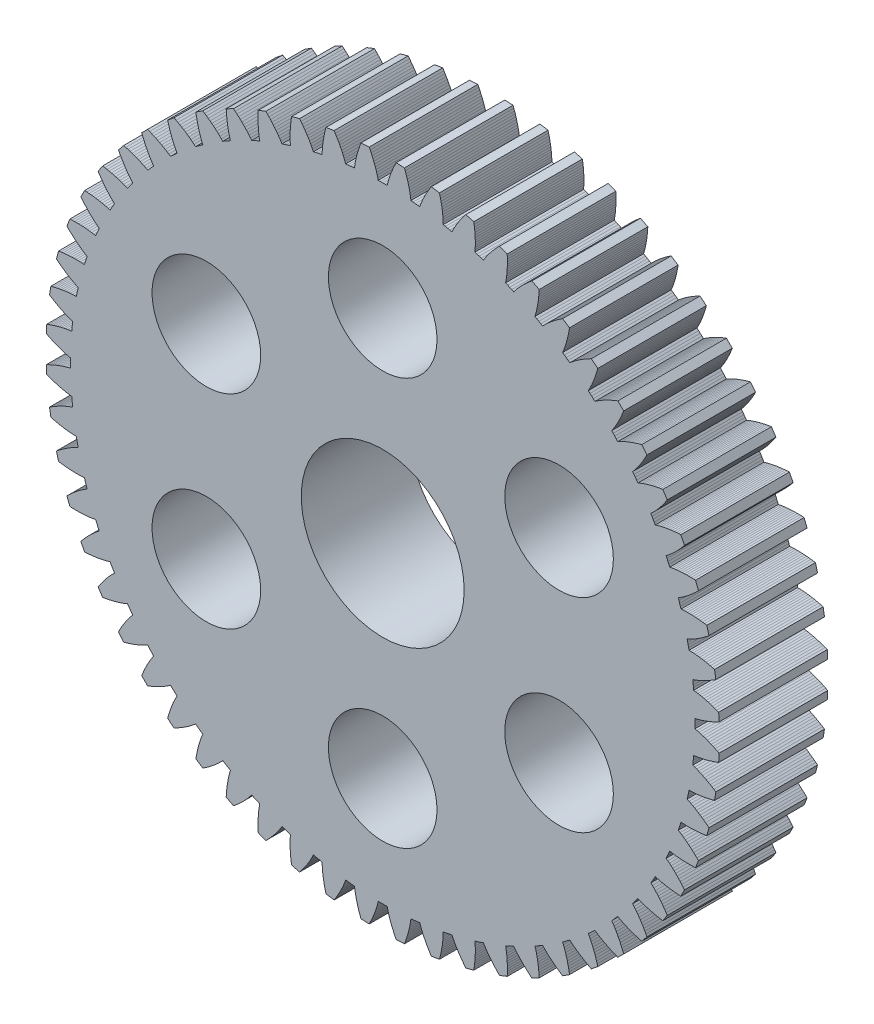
SolidWorks part; units mm, degrees
ref_plane "Front Plane" through (0, 0, 0) normal (0, 0, 1) x (1, 0, 0)
ref_plane "Top Plane" through (0, 0, 0) normal (0, 1, 0) x (1, 0, 0)
ref_plane "Right Plane" through (0, 0, 0) normal (1, 0, 0) x (0, 0, -1)
sketch "Skizze1" plane through (0, 0, 0) normal (0, 0, 1) x (1, 0, 0)
  line L0 (57.4941, 0.8224) -> (57.8679, 0.9091)
  line L1 (57.8679, 0.9091) -> (58.2413, 1.0075)
  line L2 (58.2413, 1.0075) -> (58.6144, 1.1164)
  line L3 (58.6144, 1.1164) -> (58.9871, 1.2352)
  line L4 (58.9871, 1.2352) -> (59.3594, 1.3631)
  line L5 (59.3594, 1.3631) -> (59.7312, 1.4998)
  line L6 (59.7312, 1.4998) -> (60.1025, 1.6449)
  line L7 (60.1025, 1.6449) -> (60.4733, 1.7979)
  line L8 (60.4733, 1.7979) -> (60.8435, 1.9588)
  line L9 (60.8435, 1.9588) -> (61.2131, 2.1272)
  line L10 (61.2131, 2.1272) -> (61.582, 2.3029)
  line L11 (61.582, 2.3029) -> (61.9501, 2.4858)
  line L12 (61.9501, 2.4858) -> (61.8706, 4.0034)
  line L13 (61.8706, 4.0034) -> (61.4853, 4.1468)
  line L14 (61.4853, 4.1468) -> (61.1001, 4.283)
  line L15 (61.1001, 4.283) -> (60.7149, 4.4118)
  line L16 (60.7149, 4.4118) -> (60.3299, 4.5331)
  line L17 (60.3299, 4.5331) -> (59.9452, 4.6466)
  line L18 (59.9452, 4.6466) -> (59.5607, 4.752)
  line L19 (59.5607, 4.752) -> (59.1767, 4.8491)
  line L20 (59.1767, 4.8491) -> (58.793, 4.9374)
  line L21 (58.793, 4.9374) -> (58.41, 5.0165)
  line L22 (58.41, 5.0165) -> (58.0275, 5.0859)
  line L23 (58.0275, 5.0859) -> (57.6459, 5.1447)
  line L24 (57.6459, 5.1447) -> (57.2651, 5.1919)
  line L25 (57.2651, 5.1919) -> (57.2265, 5.6013)
  line L26 (57.2265, 5.6013) -> (57.185, 6.0104)
  line L27 (57.185, 6.0104) -> (57.1406, 6.4192)
  line L28 (57.1406, 6.4192) -> (57.0932, 6.8277)
  line L29 (57.0932, 6.8277) -> (57.4558, 6.953)
  line L30 (57.4558, 6.953) -> (57.8169, 7.0899)
  line L31 (57.8169, 7.0899) -> (58.1766, 7.2372)
  line L32 (58.1766, 7.2372) -> (58.5348, 7.3943)
  line L33 (58.5348, 7.3943) -> (58.8917, 7.5604)
  line L34 (58.8917, 7.5604) -> (59.2472, 7.7352)
  line L35 (59.2472, 7.7352) -> (59.6013, 7.9183)
  line L36 (59.6013, 7.9183) -> (59.9541, 8.1093)
  line L37 (59.9541, 8.1093) -> (60.3054, 8.3079)
  line L38 (60.3054, 8.3079) -> (60.6554, 8.514)
  line L39 (60.6554, 8.514) -> (61.0039, 8.7274)
  line L40 (61.0039, 8.7274) -> (61.3509, 8.9478)
  line L41 (61.3509, 8.9478) -> (61.1132, 10.4487)
  line L42 (61.1132, 10.4487) -> (60.715, 10.551)
  line L43 (60.715, 10.551) -> (60.3177, 10.6462)
  line L44 (60.3177, 10.6462) -> (59.9212, 10.7341)
  line L45 (59.9212, 10.7341) -> (59.5256, 10.8144)
  line L46 (59.5256, 10.8144) -> (59.1311, 10.8871)
  line L47 (59.1311, 10.8871) -> (58.7377, 10.9518)
  line L48 (58.7377, 10.9518) -> (58.3456, 11.0082)
  line L49 (58.3456, 11.0082) -> (57.9549, 11.0559)
  line L50 (57.9549, 11.0559) -> (57.5656, 11.0946)
  line L51 (57.5656, 11.0946) -> (57.178, 11.1236)
  line L52 (57.178, 11.1236) -> (56.7923, 11.1421)
  line L53 (56.7923, 11.1421) -> (56.4087, 11.1493)
  line L54 (56.4087, 11.1493) -> (56.3275, 11.5524)
  line L55 (56.3275, 11.5524) -> (56.2435, 11.9549)
  line L56 (56.2435, 11.9549) -> (56.1566, 12.3568)
  line L57 (56.1566, 12.3568) -> (56.0667, 12.7581)
  line L58 (56.0667, 12.7581) -> (56.4143, 12.9207)
  line L59 (56.4143, 12.9207) -> (56.7591, 13.0945)
  line L60 (56.7591, 13.0945) -> (57.1014, 13.2787)
  line L61 (57.1014, 13.2787) -> (57.4412, 13.4723)
  line L62 (57.4412, 13.4723) -> (57.7788, 13.6749)
  line L63 (57.7788, 13.6749) -> (58.1141, 13.8859)
  line L64 (58.1141, 13.8859) -> (58.4471, 14.1049)
  line L65 (58.4471, 14.1049) -> (58.778, 14.3318)
  line L66 (58.778, 14.3318) -> (59.1066, 14.5661)
  line L67 (59.1066, 14.5661) -> (59.4331, 14.8076)
  line L68 (59.4331, 14.8076) -> (59.7574, 15.0562)
  line L69 (59.7574, 15.0562) -> (60.0796, 15.3117)
  line L70 (60.0796, 15.3117) -> (59.6863, 16.7795)
  line L71 (59.6863, 16.7795) -> (59.2796, 16.8397)
  line L72 (59.2796, 16.8397) -> (58.8744, 16.8928)
  line L73 (58.8744, 16.8928) -> (58.4709, 16.9387)
  line L74 (58.4709, 16.9387) -> (58.0691, 16.9773)
  line L75 (58.0691, 16.9773) -> (57.6692, 17.0083)
  line L76 (57.6692, 17.0083) -> (57.2712, 17.0315)
  line L77 (57.2712, 17.0315) -> (56.8753, 17.0466)
  line L78 (56.8753, 17.0466) -> (56.4817, 17.0533)
  line L79 (56.4817, 17.0533) -> (56.0906, 17.051)
  line L80 (56.0906, 17.051) -> (55.7021, 17.0394)
  line L81 (55.7021, 17.0394) -> (55.3165, 17.0175)
  line L82 (55.3165, 17.0175) -> (54.9343, 16.9845)
  line L83 (54.9343, 16.9845) -> (54.8114, 17.3769)
  line L84 (54.8114, 17.3769) -> (54.6857, 17.7685)
  line L85 (54.6857, 17.7685) -> (54.5573, 18.1591)
  line L86 (54.5573, 18.1591) -> (54.426, 18.5488)
  line L87 (54.426, 18.5488) -> (54.7547, 18.7468)
  line L88 (54.7547, 18.7468) -> (55.0794, 18.9557)
  line L89 (55.0794, 18.9557) -> (55.4006, 19.1746)
  line L90 (55.4006, 19.1746) -> (55.7183, 19.4027)
  line L91 (55.7183, 19.4027) -> (56.0329, 19.6395)
  line L92 (56.0329, 19.6395) -> (56.3443, 19.8844)
  line L93 (56.3443, 19.8844) -> (56.6526, 20.1371)
  line L94 (56.6526, 20.1371) -> (56.9579, 20.3972)
  line L95 (56.9579, 20.3972) -> (57.2603, 20.6646)
  line L96 (57.2603, 20.6646) -> (57.5597, 20.9389)
  line L97 (57.5597, 20.9389) -> (57.8563, 21.2201)
  line L98 (57.8563, 21.2201) -> (58.1499, 21.5078)
  line L99 (58.1499, 21.5078) -> (57.6053, 22.9265)
  line L100 (57.6053, 22.9265) -> (57.1946, 22.9438)
  line L101 (57.1946, 22.9438) -> (56.7861, 22.9543)
  line L102 (56.7861, 22.9543) -> (56.38, 22.9578)
  line L103 (56.38, 22.9578) -> (55.9764, 22.9542)
  line L104 (55.9764, 22.9542) -> (55.5754, 22.9432)
  line L105 (55.5754, 22.9432) -> (55.1772, 22.9247)
  line L106 (55.1772, 22.9247) -> (54.7819, 22.8983)
  line L107 (54.7819, 22.8983) -> (54.3898, 22.8638)
  line L108 (54.3898, 22.8638) -> (54.001, 22.8207)
  line L109 (54.001, 22.8207) -> (53.6158, 22.7685)
  line L110 (53.6158, 22.7685) -> (53.2347, 22.7065)
  line L111 (53.2347, 22.7065) -> (52.858, 22.6337)
  line L112 (52.858, 22.6337) -> (52.6948, 23.0111)
  line L113 (52.6948, 23.0111) -> (52.5289, 23.3874)
  line L114 (52.5289, 23.3874) -> (52.3603, 23.7624)
  line L115 (52.3603, 23.7624) -> (52.189, 24.1363)
  line L116 (52.189, 24.1363) -> (52.4951, 24.3675)
  line L117 (52.4951, 24.3675) -> (52.7963, 24.6093)
  line L118 (52.7963, 24.6093) -> (53.0928, 24.8605)
  line L119 (53.0928, 24.8605) -> (53.385, 25.1206)
  line L120 (53.385, 25.1206) -> (53.673, 25.3889)
  line L121 (53.673, 25.3889) -> (53.9571, 25.665)
  line L122 (53.9571, 25.665) -> (54.2373, 25.9485)
  line L123 (54.2373, 25.9485) -> (54.5138, 26.2392)
  line L124 (54.5138, 26.2392) -> (54.7866, 26.5367)
  line L125 (54.7866, 26.5367) -> (55.0557, 26.8409)
  line L126 (55.0557, 26.8409) -> (55.3212, 27.1515)
  line L127 (55.3212, 27.1515) -> (55.5832, 27.4683)
  line L128 (55.5832, 27.4683) -> (54.8933, 28.8223)
  line L129 (54.8933, 28.8223) -> (54.483, 28.7966)
  line L130 (54.483, 28.7966) -> (54.0756, 28.7643)
  line L131 (54.0756, 28.7643) -> (53.6714, 28.7254)
  line L132 (53.6714, 28.7254) -> (53.2704, 28.6796)
  line L133 (53.2704, 28.6796) -> (52.8727, 28.6268)
  line L134 (52.8727, 28.6268) -> (52.4786, 28.5667)
  line L135 (52.4786, 28.5667) -> (52.0883, 28.4992)
  line L136 (52.0883, 28.4992) -> (51.7019, 28.4238)
  line L137 (51.7019, 28.4238) -> (51.3198, 28.3403)
  line L138 (51.3198, 28.3403) -> (50.9422, 28.2481)
  line L139 (50.9422, 28.2481) -> (50.5696, 28.1466)
  line L140 (50.5696, 28.1466) -> (50.2026, 28.0348)
  line L141 (50.2026, 28.0348) -> (50.0008, 28.3931)
  line L142 (50.0008, 28.3931) -> (49.7965, 28.75)
  line L143 (49.7965, 28.75) -> (49.5896, 29.1054)
  line L144 (49.5896, 29.1054) -> (49.3802, 29.4593)
  line L145 (49.3802, 29.4593) -> (49.6605, 29.7213)
  line L146 (49.6605, 29.7213) -> (49.9347, 29.9932)
  line L147 (49.9347, 29.9932) -> (50.2033, 30.2741)
  line L148 (50.2033, 30.2741) -> (50.4667, 30.5632)
  line L149 (50.4667, 30.5632) -> (50.7251, 30.8602)
  line L150 (50.7251, 30.8602) -> (50.9788, 31.1645)
  line L151 (50.9788, 31.1645) -> (51.2279, 31.4757)
  line L152 (51.2279, 31.4757) -> (51.4724, 31.7937)
  line L153 (51.4724, 31.7937) -> (51.7126, 32.1181)
  line L154 (51.7126, 32.1181) -> (51.9485, 32.4487)
  line L155 (51.9485, 32.4487) -> (52.1801, 32.7854)
  line L156 (52.1801, 32.7854) -> (52.4075, 33.1279)
  line L157 (52.4075, 33.1279) -> (51.5798, 34.4023)
  line L158 (51.5798, 34.4023) -> (51.1745, 34.3339)
  line L159 (51.1745, 34.3339) -> (50.7727, 34.2592)
  line L160 (50.7727, 34.2592) -> (50.3748, 34.1782)
  line L161 (50.3748, 34.1782) -> (49.9807, 34.0907)
  line L162 (49.9807, 34.0907) -> (49.5908, 33.9966)
  line L163 (49.5908, 33.9966) -> (49.2051, 33.8957)
  line L164 (49.2051, 33.8957) -> (48.824, 33.7877)
  line L165 (48.824, 33.7877) -> (48.4476, 33.6724)
  line L166 (48.4476, 33.6724) -> (48.0763, 33.5494)
  line L167 (48.0763, 33.5494) -> (47.7104, 33.4183)
  line L168 (47.7104, 33.4183) -> (47.3505, 33.2784)
  line L169 (47.3505, 33.2784) -> (46.9971, 33.1289)
  line L170 (46.9971, 33.1289) -> (46.759, 33.4641)
  line L171 (46.759, 33.4641) -> (46.5185, 33.7977)
  line L172 (46.5185, 33.7977) -> (46.2756, 34.1295)
  line L173 (46.2756, 34.1295) -> (46.0303, 34.4595)
  line L174 (46.0303, 34.4595) -> (46.2817, 34.7494)
  line L175 (46.2817, 34.7494) -> (46.526, 35.0485)
  line L176 (46.526, 35.0485) -> (46.7638, 35.3559)
  line L177 (46.7638, 35.3559) -> (46.9955, 35.671)
  line L178 (46.9955, 35.671) -> (47.2215, 35.9934)
  line L179 (47.2215, 35.9934) -> (47.442, 36.3225)
  line L180 (47.442, 36.3225) -> (47.6571, 36.6581)
  line L181 (47.6571, 36.6581) -> (47.8671, 36.9999)
  line L182 (47.8671, 36.9999) -> (48.0721, 37.3476)
  line L183 (48.0721, 37.3476) -> (48.2721, 37.7011)
  line L184 (48.2721, 37.7011) -> (48.4672, 38.0601)
  line L185 (48.4672, 38.0601) -> (48.6576, 38.4245)
  line L186 (48.6576, 38.4245) -> (47.7013, 39.6054)
  line L187 (47.7013, 39.6054) -> (47.3053, 39.495)
  line L188 (47.3053, 39.495) -> (46.9135, 39.3787)
  line L189 (46.9135, 39.3787) -> (46.5262, 39.2566)
  line L190 (46.5262, 39.2566) -> (46.1435, 39.1284)
  line L191 (46.1435, 39.1284) -> (45.7655, 38.994)
  line L192 (45.7655, 38.994) -> (45.3925, 38.8534)
  line L193 (45.3925, 38.8534) -> (45.0247, 38.7061)
  line L194 (45.0247, 38.7061) -> (44.6624, 38.5521)
  line L195 (44.6624, 38.5521) -> (44.306, 38.391)
  line L196 (44.306, 38.391) -> (43.9559, 38.2223)
  line L197 (43.9559, 38.2223) -> (43.6125, 38.0455)
  line L198 (43.6125, 38.0455) -> (43.2768, 37.8599)
  line L199 (43.2768, 37.8599) -> (43.0049, 38.1684)
  line L200 (43.0049, 38.1684) -> (42.7308, 38.475)
  line L201 (42.7308, 38.475) -> (42.4546, 38.7796)
  line L202 (42.4546, 38.7796) -> (42.1762, 39.0822)
  line L203 (42.1762, 39.0822) -> (42.3959, 39.3968)
  line L204 (42.3959, 39.3968) -> (42.6076, 39.7197)
  line L205 (42.6076, 39.7197) -> (42.8119, 40.0503)
  line L206 (42.8119, 40.0503) -> (43.0094, 40.388)
  line L207 (43.0094, 40.388) -> (43.2005, 40.7322)
  line L208 (43.2005, 40.7322) -> (43.3853, 41.0825)
  line L209 (43.3853, 41.0825) -> (43.5642, 41.4388)
  line L210 (43.5642, 41.4388) -> (43.7373, 41.8007)
  line L211 (43.7373, 41.8007) -> (43.9048, 42.1679)
  line L212 (43.9048, 42.1679) -> (44.0668, 42.5403)
  line L213 (44.0668, 42.5403) -> (44.2234, 42.9178)
  line L214 (44.2234, 42.9178) -> (44.3746, 43.3001)
  line L215 (44.3746, 43.3001) -> (43.3001, 44.3746)
  line L216 (43.3001, 44.3746) -> (42.9178, 44.2234)
  line L217 (42.9178, 44.2234) -> (42.5403, 44.0668)
  line L218 (42.5403, 44.0668) -> (42.1679, 43.9048)
  line L219 (42.1679, 43.9048) -> (41.8007, 43.7373)
  line L220 (41.8007, 43.7373) -> (41.4388, 43.5642)
  line L221 (41.4388, 43.5642) -> (41.0825, 43.3853)
  line L222 (41.0825, 43.3853) -> (40.7322, 43.2005)
  line L223 (40.7322, 43.2005) -> (40.388, 43.0094)
  line L224 (40.388, 43.0094) -> (40.0503, 42.8119)
  line L225 (40.0503, 42.8119) -> (39.7197, 42.6076)
  line L226 (39.7197, 42.6076) -> (39.3968, 42.3959)
  line L227 (39.3968, 42.3959) -> (39.0822, 42.1762)
  line L228 (39.0822, 42.1762) -> (38.7796, 42.4546)
  line L229 (38.7796, 42.4546) -> (38.475, 42.7308)
  line L230 (38.475, 42.7308) -> (38.1684, 43.0049)
  line L231 (38.1684, 43.0049) -> (37.8599, 43.2768)
  line L232 (37.8599, 43.2768) -> (38.0455, 43.6125)
  line L233 (38.0455, 43.6125) -> (38.2223, 43.9559)
  line L234 (38.2223, 43.9559) -> (38.391, 44.306)
  line L235 (38.391, 44.306) -> (38.5521, 44.6624)
  line L236 (38.5521, 44.6624) -> (38.7061, 45.0247)
  line L237 (38.7061, 45.0247) -> (38.8534, 45.3925)
  line L238 (38.8534, 45.3925) -> (38.994, 45.7655)
  line L239 (38.994, 45.7655) -> (39.1284, 46.1435)
  line L240 (39.1284, 46.1435) -> (39.2566, 46.5262)
  line L241 (39.2566, 46.5262) -> (39.3787, 46.9135)
  line L242 (39.3787, 46.9135) -> (39.495, 47.3053)
  line L243 (39.495, 47.3053) -> (39.6054, 47.7013)
  line L244 (39.6054, 47.7013) -> (38.4245, 48.6576)
  line L245 (38.4245, 48.6576) -> (38.0601, 48.4672)
  line L246 (38.0601, 48.4672) -> (37.7011, 48.2721)
  line L247 (37.7011, 48.2721) -> (37.3476, 48.0721)
  line L248 (37.3476, 48.0721) -> (36.9999, 47.8671)
  line L249 (36.9999, 47.8671) -> (36.6581, 47.6571)
  line L250 (36.6581, 47.6571) -> (36.3225, 47.442)
  line L251 (36.3225, 47.442) -> (35.9934, 47.2215)
  line L252 (35.9934, 47.2215) -> (35.671, 46.9955)
  line L253 (35.671, 46.9955) -> (35.3559, 46.7638)
  line L254 (35.3559, 46.7638) -> (35.0485, 46.526)
  line L255 (35.0485, 46.526) -> (34.7494, 46.2817)
  line L256 (34.7494, 46.2817) -> (34.4595, 46.0303)
  line L257 (34.4595, 46.0303) -> (34.1295, 46.2756)
  line L258 (34.1295, 46.2756) -> (33.7977, 46.5185)
  line L259 (33.7977, 46.5185) -> (33.4641, 46.759)
  line L260 (33.4641, 46.759) -> (33.1289, 46.9971)
  line L261 (33.1289, 46.9971) -> (33.2784, 47.3505)
  line L262 (33.2784, 47.3505) -> (33.4183, 47.7104)
  line L263 (33.4183, 47.7104) -> (33.5494, 48.0763)
  line L264 (33.5494, 48.0763) -> (33.6724, 48.4476)
  line L265 (33.6724, 48.4476) -> (33.7877, 48.824)
  line L266 (33.7877, 48.824) -> (33.8957, 49.2051)
  line L267 (33.8957, 49.2051) -> (33.9966, 49.5908)
  line L268 (33.9966, 49.5908) -> (34.0907, 49.9807)
  line L269 (34.0907, 49.9807) -> (34.1782, 50.3748)
  line L270 (34.1782, 50.3748) -> (34.2592, 50.7727)
  line L271 (34.2592, 50.7727) -> (34.3339, 51.1745)
  line L272 (34.3339, 51.1745) -> (34.4023, 51.5798)
  line L273 (34.4023, 51.5798) -> (33.1279, 52.4075)
  line L274 (33.1279, 52.4075) -> (32.7854, 52.1801)
  line L275 (32.7854, 52.1801) -> (32.4487, 51.9485)
  line L276 (32.4487, 51.9485) -> (32.1181, 51.7126)
  line L277 (32.1181, 51.7126) -> (31.7937, 51.4724)
  line L278 (31.7937, 51.4724) -> (31.4757, 51.2279)
  line L279 (31.4757, 51.2279) -> (31.1645, 50.9788)
  line L280 (31.1645, 50.9788) -> (30.8602, 50.7251)
  line L281 (30.8602, 50.7251) -> (30.5632, 50.4667)
  line L282 (30.5632, 50.4667) -> (30.2741, 50.2033)
  line L283 (30.2741, 50.2033) -> (29.9932, 49.9347)
  line L284 (29.9932, 49.9347) -> (29.7213, 49.6605)
  line L285 (29.7213, 49.6605) -> (29.4593, 49.3802)
  line L286 (29.4593, 49.3802) -> (29.1054, 49.5896)
  line L287 (29.1054, 49.5896) -> (28.75, 49.7965)
  line L288 (28.75, 49.7965) -> (28.3931, 50.0008)
  line L289 (28.3931, 50.0008) -> (28.0348, 50.2026)
  line L290 (28.0348, 50.2026) -> (28.1466, 50.5696)
  line L291 (28.1466, 50.5696) -> (28.2481, 50.9422)
  line L292 (28.2481, 50.9422) -> (28.3403, 51.3198)
  line L293 (28.3403, 51.3198) -> (28.4238, 51.7019)
  line L294 (28.4238, 51.7019) -> (28.4992, 52.0883)
  line L295 (28.4992, 52.0883) -> (28.5667, 52.4786)
  line L296 (28.5667, 52.4786) -> (28.6268, 52.8727)
  line L297 (28.6268, 52.8727) -> (28.6796, 53.2704)
  line L298 (28.6796, 53.2704) -> (28.7254, 53.6714)
  line L299 (28.7254, 53.6714) -> (28.7643, 54.0756)
  line L300 (28.7643, 54.0756) -> (28.7966, 54.483)
  line L301 (28.7966, 54.483) -> (28.8223, 54.8933)
  line L302 (28.8223, 54.8933) -> (27.4683, 55.5832)
  line L303 (27.4683, 55.5832) -> (27.1515, 55.3212)
  line L304 (27.1515, 55.3212) -> (26.8409, 55.0557)
  line L305 (26.8409, 55.0557) -> (26.5367, 54.7866)
  line L306 (26.5367, 54.7866) -> (26.2392, 54.5138)
  line L307 (26.2392, 54.5138) -> (25.9485, 54.2373)
  line L308 (25.9485, 54.2373) -> (25.665, 53.9571)
  line L309 (25.665, 53.9571) -> (25.3889, 53.673)
  line L310 (25.3889, 53.673) -> (25.1206, 53.385)
  line L311 (25.1206, 53.385) -> (24.8605, 53.0928)
  line L312 (24.8605, 53.0928) -> (24.6093, 52.7963)
  line L313 (24.6093, 52.7963) -> (24.3675, 52.4951)
  line L314 (24.3675, 52.4951) -> (24.1363, 52.189)
  line L315 (24.1363, 52.189) -> (23.7624, 52.3603)
  line L316 (23.7624, 52.3603) -> (23.3874, 52.5289)
  line L317 (23.3874, 52.5289) -> (23.0111, 52.6948)
  line L318 (23.0111, 52.6948) -> (22.6337, 52.858)
  line L319 (22.6337, 52.858) -> (22.7065, 53.2347)
  line L320 (22.7065, 53.2347) -> (22.7685, 53.6158)
  line L321 (22.7685, 53.6158) -> (22.8207, 54.001)
  line L322 (22.8207, 54.001) -> (22.8638, 54.3898)
  line L323 (22.8638, 54.3898) -> (22.8983, 54.7819)
  line L324 (22.8983, 54.7819) -> (22.9247, 55.1772)
  line L325 (22.9247, 55.1772) -> (22.9432, 55.5754)
  line L326 (22.9432, 55.5754) -> (22.9542, 55.9764)
  line L327 (22.9542, 55.9764) -> (22.9578, 56.38)
  line L328 (22.9578, 56.38) -> (22.9543, 56.7861)
  line L329 (22.9543, 56.7861) -> (22.9438, 57.1946)
  line L330 (22.9438, 57.1946) -> (22.9265, 57.6053)
  line L331 (22.9265, 57.6053) -> (21.5078, 58.1499)
  line L332 (21.5078, 58.1499) -> (21.2201, 57.8563)
  line L333 (21.2201, 57.8563) -> (20.9389, 57.5597)
  line L334 (20.9389, 57.5597) -> (20.6646, 57.2603)
  line L335 (20.6646, 57.2603) -> (20.3972, 56.9579)
  line L336 (20.3972, 56.9579) -> (20.1371, 56.6526)
  line L337 (20.1371, 56.6526) -> (19.8844, 56.3443)
  line L338 (19.8844, 56.3443) -> (19.6395, 56.0329)
  line L339 (19.6395, 56.0329) -> (19.4027, 55.7183)
  line L340 (19.4027, 55.7183) -> (19.1746, 55.4006)
  line L341 (19.1746, 55.4006) -> (18.9557, 55.0794)
  line L342 (18.9557, 55.0794) -> (18.7468, 54.7547)
  line L343 (18.7468, 54.7547) -> (18.5488, 54.426)
  line L344 (18.5488, 54.426) -> (18.1591, 54.5573)
  line L345 (18.1591, 54.5573) -> (17.7685, 54.6857)
  line L346 (17.7685, 54.6857) -> (17.3769, 54.8114)
  line L347 (17.3769, 54.8114) -> (16.9845, 54.9343)
  line L348 (16.9845, 54.9343) -> (17.0175, 55.3165)
  line L349 (17.0175, 55.3165) -> (17.0394, 55.7021)
  line L350 (17.0394, 55.7021) -> (17.051, 56.0906)
  line L351 (17.051, 56.0906) -> (17.0533, 56.4817)
  line L352 (17.0533, 56.4817) -> (17.0466, 56.8753)
  line L353 (17.0466, 56.8753) -> (17.0315, 57.2712)
  line L354 (17.0315, 57.2712) -> (17.0083, 57.6692)
  line L355 (17.0083, 57.6692) -> (16.9773, 58.0691)
  line L356 (16.9773, 58.0691) -> (16.9387, 58.4709)
  line L357 (16.9387, 58.4709) -> (16.8928, 58.8744)
  line L358 (16.8928, 58.8744) -> (16.8397, 59.2796)
  line L359 (16.8397, 59.2796) -> (16.7795, 59.6863)
  line L360 (16.7795, 59.6863) -> (15.3117, 60.0796)
  line L361 (15.3117, 60.0796) -> (15.0562, 59.7574)
  line L362 (15.0562, 59.7574) -> (14.8076, 59.4331)
  line L363 (14.8076, 59.4331) -> (14.5661, 59.1066)
  line L364 (14.5661, 59.1066) -> (14.3318, 58.778)
  line L365 (14.3318, 58.778) -> (14.1049, 58.4471)
  line L366 (14.1049, 58.4471) -> (13.8859, 58.1141)
  line L367 (13.8859, 58.1141) -> (13.6749, 57.7788)
  line L368 (13.6749, 57.7788) -> (13.4723, 57.4412)
  line L369 (13.4723, 57.4412) -> (13.2787, 57.1014)
  line L370 (13.2787, 57.1014) -> (13.0945, 56.7591)
  line L371 (13.0945, 56.7591) -> (12.9207, 56.4143)
  line L372 (12.9207, 56.4143) -> (12.7581, 56.0667)
  line L373 (12.7581, 56.0667) -> (12.3568, 56.1566)
  line L374 (12.3568, 56.1566) -> (11.9549, 56.2435)
  line L375 (11.9549, 56.2435) -> (11.5524, 56.3275)
  line L376 (11.5524, 56.3275) -> (11.1493, 56.4087)
  line L377 (11.1493, 56.4087) -> (11.1421, 56.7923)
  line L378 (11.1421, 56.7923) -> (11.1236, 57.178)
  line L379 (11.1236, 57.178) -> (11.0946, 57.5656)
  line L380 (11.0946, 57.5656) -> (11.0559, 57.9549)
  line L381 (11.0559, 57.9549) -> (11.0082, 58.3456)
  line L382 (11.0082, 58.3456) -> (10.9518, 58.7377)
  line L383 (10.9518, 58.7377) -> (10.8871, 59.1311)
  line L384 (10.8871, 59.1311) -> (10.8144, 59.5256)
  line L385 (10.8144, 59.5256) -> (10.7341, 59.9212)
  line L386 (10.7341, 59.9212) -> (10.6462, 60.3177)
  line L387 (10.6462, 60.3177) -> (10.551, 60.715)
  line L388 (10.551, 60.715) -> (10.4487, 61.1132)
  line L389 (10.4487, 61.1132) -> (8.9478, 61.3509)
  line L390 (8.9478, 61.3509) -> (8.7274, 61.0039)
  line L391 (8.7274, 61.0039) -> (8.514, 60.6554)
  line L392 (8.514, 60.6554) -> (8.3079, 60.3054)
  line L393 (8.3079, 60.3054) -> (8.1093, 59.9541)
  line L394 (8.1093, 59.9541) -> (7.9183, 59.6013)
  line L395 (7.9183, 59.6013) -> (7.7352, 59.2472)
  line L396 (7.7352, 59.2472) -> (7.5604, 58.8917)
  line L397 (7.5604, 58.8917) -> (7.3943, 58.5348)
  line L398 (7.3943, 58.5348) -> (7.2372, 58.1766)
  line L399 (7.2372, 58.1766) -> (7.0899, 57.8169)
  line L400 (7.0899, 57.8169) -> (6.953, 57.4558)
  line L401 (6.953, 57.4558) -> (6.8277, 57.0932)
  line L402 (6.8277, 57.0932) -> (6.4192, 57.1406)
  line L403 (6.4192, 57.1406) -> (6.0104, 57.185)
  line L404 (6.0104, 57.185) -> (5.6013, 57.2265)
  line L405 (5.6013, 57.2265) -> (5.1919, 57.2651)
  line L406 (5.1919, 57.2651) -> (5.1447, 57.6459)
  line L407 (5.1447, 57.6459) -> (5.0859, 58.0275)
  line L408 (5.0859, 58.0275) -> (5.0165, 58.41)
  line L409 (5.0165, 58.41) -> (4.9374, 58.793)
  line L410 (4.9374, 58.793) -> (4.8491, 59.1767)
  line L411 (4.8491, 59.1767) -> (4.752, 59.5607)
  line L412 (4.752, 59.5607) -> (4.6466, 59.9452)
  line L413 (4.6466, 59.9452) -> (4.5331, 60.3299)
  line L414 (4.5331, 60.3299) -> (4.4118, 60.7149)
  line L415 (4.4118, 60.7149) -> (4.283, 61.1001)
  line L416 (4.283, 61.1001) -> (4.1468, 61.4853)
  line L417 (4.1468, 61.4853) -> (4.0034, 61.8706)
  line L418 (4.0034, 61.8706) -> (2.4858, 61.9501)
  line L419 (2.4858, 61.9501) -> (2.3029, 61.582)
  line L420 (2.3029, 61.582) -> (2.1272, 61.2131)
  line L421 (2.1272, 61.2131) -> (1.9588, 60.8435)
  line L422 (1.9588, 60.8435) -> (1.7979, 60.4733)
  line L423 (1.7979, 60.4733) -> (1.6449, 60.1025)
  line L424 (1.6449, 60.1025) -> (1.4998, 59.7312)
  line L425 (1.4998, 59.7312) -> (1.3631, 59.3594)
  line L426 (1.3631, 59.3594) -> (1.2352, 58.9871)
  line L427 (1.2352, 58.9871) -> (1.1164, 58.6144)
  line L428 (1.1164, 58.6144) -> (1.0075, 58.2413)
  line L429 (1.0075, 58.2413) -> (0.9091, 57.8679)
  line L430 (0.9091, 57.8679) -> (0.8224, 57.4941)
  line L431 (0.8224, 57.4941) -> (0.4112, 57.4985)
  line L432 (0.4112, 57.4985) -> (0, 57.5)
  line L433 (0, 57.5) -> (-0.4112, 57.4985)
  line L434 (-0.4112, 57.4985) -> (-0.8224, 57.4941)
  line L435 (-0.8224, 57.4941) -> (-0.9091, 57.8679)
  line L436 (-0.9091, 57.8679) -> (-1.0075, 58.2413)
  line L437 (-1.0075, 58.2413) -> (-1.1164, 58.6144)
  line L438 (-1.1164, 58.6144) -> (-1.2352, 58.9871)
  line L439 (-1.2352, 58.9871) -> (-1.3631, 59.3594)
  line L440 (-1.3631, 59.3594) -> (-1.4998, 59.7312)
  line L441 (-1.4998, 59.7312) -> (-1.6449, 60.1025)
  line L442 (-1.6449, 60.1025) -> (-1.7979, 60.4733)
  line L443 (-1.7979, 60.4733) -> (-1.9588, 60.8435)
  line L444 (-1.9588, 60.8435) -> (-2.1272, 61.2131)
  line L445 (-2.1272, 61.2131) -> (-2.3029, 61.582)
  line L446 (-2.3029, 61.582) -> (-2.4858, 61.9501)
  line L447 (-2.4858, 61.9501) -> (-4.0034, 61.8706)
  line L448 (-4.0034, 61.8706) -> (-4.1468, 61.4853)
  line L449 (-4.1468, 61.4853) -> (-4.283, 61.1001)
  line L450 (-4.283, 61.1001) -> (-4.4118, 60.7149)
  line L451 (-4.4118, 60.7149) -> (-4.5331, 60.3299)
  line L452 (-4.5331, 60.3299) -> (-4.6466, 59.9452)
  line L453 (-4.6466, 59.9452) -> (-4.752, 59.5607)
  line L454 (-4.752, 59.5607) -> (-4.8491, 59.1767)
  line L455 (-4.8491, 59.1767) -> (-4.9374, 58.793)
  line L456 (-4.9374, 58.793) -> (-5.0165, 58.41)
  line L457 (-5.0165, 58.41) -> (-5.0859, 58.0275)
  line L458 (-5.0859, 58.0275) -> (-5.1447, 57.6459)
  line L459 (-5.1447, 57.6459) -> (-5.1919, 57.2651)
  line L460 (-5.1919, 57.2651) -> (-5.6013, 57.2265)
  line L461 (-5.6013, 57.2265) -> (-6.0104, 57.185)
  line L462 (-6.0104, 57.185) -> (-6.4192, 57.1406)
  line L463 (-6.4192, 57.1406) -> (-6.8277, 57.0932)
  line L464 (-6.8277, 57.0932) -> (-6.953, 57.4558)
  line L465 (-6.953, 57.4558) -> (-7.0899, 57.8169)
  line L466 (-7.0899, 57.8169) -> (-7.2372, 58.1766)
  line L467 (-7.2372, 58.1766) -> (-7.3943, 58.5348)
  line L468 (-7.3943, 58.5348) -> (-7.5604, 58.8917)
  line L469 (-7.5604, 58.8917) -> (-7.7352, 59.2472)
  line L470 (-7.7352, 59.2472) -> (-7.9183, 59.6013)
  line L471 (-7.9183, 59.6013) -> (-8.1093, 59.9541)
  line L472 (-8.1093, 59.9541) -> (-8.3079, 60.3054)
  line L473 (-8.3079, 60.3054) -> (-8.514, 60.6554)
  line L474 (-8.514, 60.6554) -> (-8.7274, 61.0039)
  line L475 (-8.7274, 61.0039) -> (-8.9478, 61.3509)
  line L476 (-8.9478, 61.3509) -> (-10.4487, 61.1132)
  line L477 (-10.4487, 61.1132) -> (-10.551, 60.715)
  line L478 (-10.551, 60.715) -> (-10.6462, 60.3177)
  line L479 (-10.6462, 60.3177) -> (-10.7341, 59.9212)
  line L480 (-10.7341, 59.9212) -> (-10.8144, 59.5256)
  line L481 (-10.8144, 59.5256) -> (-10.8871, 59.1311)
  line L482 (-10.8871, 59.1311) -> (-10.9518, 58.7377)
  line L483 (-10.9518, 58.7377) -> (-11.0082, 58.3456)
  line L484 (-11.0082, 58.3456) -> (-11.0559, 57.9549)
  line L485 (-11.0559, 57.9549) -> (-11.0946, 57.5656)
  line L486 (-11.0946, 57.5656) -> (-11.1236, 57.178)
  line L487 (-11.1236, 57.178) -> (-11.1421, 56.7923)
  line L488 (-11.1421, 56.7923) -> (-11.1493, 56.4087)
  line L489 (-11.1493, 56.4087) -> (-11.5524, 56.3275)
  line L490 (-11.5524, 56.3275) -> (-11.9549, 56.2435)
  line L491 (-11.9549, 56.2435) -> (-12.3568, 56.1566)
  line L492 (-12.3568, 56.1566) -> (-12.7581, 56.0667)
  line L493 (-12.7581, 56.0667) -> (-12.9207, 56.4143)
  line L494 (-12.9207, 56.4143) -> (-13.0945, 56.7591)
  line L495 (-13.0945, 56.7591) -> (-13.2787, 57.1014)
  line L496 (-13.2787, 57.1014) -> (-13.4723, 57.4412)
  line L497 (-13.4723, 57.4412) -> (-13.6749, 57.7788)
  line L498 (-13.6749, 57.7788) -> (-13.8859, 58.1141)
  line L499 (-13.8859, 58.1141) -> (-14.1049, 58.4471)
  line L500 (-14.1049, 58.4471) -> (-14.3318, 58.778)
  line L501 (-14.3318, 58.778) -> (-14.5661, 59.1066)
  line L502 (-14.5661, 59.1066) -> (-14.8076, 59.4331)
  line L503 (-14.8076, 59.4331) -> (-15.0562, 59.7574)
  line L504 (-15.0562, 59.7574) -> (-15.3117, 60.0796)
  line L505 (-15.3117, 60.0796) -> (-16.7795, 59.6863)
  line L506 (-16.7795, 59.6863) -> (-16.8397, 59.2796)
  line L507 (-16.8397, 59.2796) -> (-16.8928, 58.8744)
  line L508 (-16.8928, 58.8744) -> (-16.9387, 58.4709)
  line L509 (-16.9387, 58.4709) -> (-16.9773, 58.0691)
  line L510 (-16.9773, 58.0691) -> (-17.0083, 57.6692)
  line L511 (-17.0083, 57.6692) -> (-17.0315, 57.2712)
  line L512 (-17.0315, 57.2712) -> (-17.0466, 56.8753)
  line L513 (-17.0466, 56.8753) -> (-17.0533, 56.4817)
  line L514 (-17.0533, 56.4817) -> (-17.051, 56.0906)
  line L515 (-17.051, 56.0906) -> (-17.0394, 55.7021)
  line L516 (-17.0394, 55.7021) -> (-17.0175, 55.3165)
  line L517 (-17.0175, 55.3165) -> (-16.9845, 54.9343)
  line L518 (-16.9845, 54.9343) -> (-17.3769, 54.8114)
  line L519 (-17.3769, 54.8114) -> (-17.7685, 54.6857)
  line L520 (-17.7685, 54.6857) -> (-18.1591, 54.5573)
  line L521 (-18.1591, 54.5573) -> (-18.5488, 54.426)
  line L522 (-18.5488, 54.426) -> (-18.7468, 54.7547)
  line L523 (-18.7468, 54.7547) -> (-18.9557, 55.0794)
  line L524 (-18.9557, 55.0794) -> (-19.1746, 55.4006)
  line L525 (-19.1746, 55.4006) -> (-19.4027, 55.7183)
  line L526 (-19.4027, 55.7183) -> (-19.6395, 56.0329)
  line L527 (-19.6395, 56.0329) -> (-19.8844, 56.3443)
  line L528 (-19.8844, 56.3443) -> (-20.1371, 56.6526)
  line L529 (-20.1371, 56.6526) -> (-20.3972, 56.9579)
  line L530 (-20.3972, 56.9579) -> (-20.6646, 57.2603)
  line L531 (-20.6646, 57.2603) -> (-20.9389, 57.5597)
  line L532 (-20.9389, 57.5597) -> (-21.2201, 57.8563)
  line L533 (-21.2201, 57.8563) -> (-21.5078, 58.1499)
  line L534 (-21.5078, 58.1499) -> (-22.9265, 57.6053)
  line L535 (-22.9265, 57.6053) -> (-22.9438, 57.1946)
  line L536 (-22.9438, 57.1946) -> (-22.9543, 56.7861)
  line L537 (-22.9543, 56.7861) -> (-22.9578, 56.38)
  line L538 (-22.9578, 56.38) -> (-22.9542, 55.9764)
  line L539 (-22.9542, 55.9764) -> (-22.9432, 55.5754)
  line L540 (-22.9432, 55.5754) -> (-22.9247, 55.1772)
  line L541 (-22.9247, 55.1772) -> (-22.8983, 54.7819)
  line L542 (-22.8983, 54.7819) -> (-22.8638, 54.3898)
  line L543 (-22.8638, 54.3898) -> (-22.8207, 54.001)
  line L544 (-22.8207, 54.001) -> (-22.7685, 53.6158)
  line L545 (-22.7685, 53.6158) -> (-22.7065, 53.2347)
  line L546 (-22.7065, 53.2347) -> (-22.6337, 52.858)
  line L547 (-22.6337, 52.858) -> (-23.0111, 52.6948)
  line L548 (-23.0111, 52.6948) -> (-23.3874, 52.5289)
  line L549 (-23.3874, 52.5289) -> (-23.7624, 52.3603)
  line L550 (-23.7624, 52.3603) -> (-24.1363, 52.189)
  line L551 (-24.1363, 52.189) -> (-24.3675, 52.4951)
  line L552 (-24.3675, 52.4951) -> (-24.6093, 52.7963)
  line L553 (-24.6093, 52.7963) -> (-24.8605, 53.0928)
  line L554 (-24.8605, 53.0928) -> (-25.1206, 53.385)
  line L555 (-25.1206, 53.385) -> (-25.3889, 53.673)
  line L556 (-25.3889, 53.673) -> (-25.665, 53.9571)
  line L557 (-25.665, 53.9571) -> (-25.9485, 54.2373)
  line L558 (-25.9485, 54.2373) -> (-26.2392, 54.5138)
  line L559 (-26.2392, 54.5138) -> (-26.5367, 54.7866)
  line L560 (-26.5367, 54.7866) -> (-26.8409, 55.0557)
  line L561 (-26.8409, 55.0557) -> (-27.1515, 55.3212)
  line L562 (-27.1515, 55.3212) -> (-27.4683, 55.5832)
  line L563 (-27.4683, 55.5832) -> (-28.8223, 54.8933)
  line L564 (-28.8223, 54.8933) -> (-28.7966, 54.483)
  line L565 (-28.7966, 54.483) -> (-28.7643, 54.0756)
  line L566 (-28.7643, 54.0756) -> (-28.7254, 53.6714)
  line L567 (-28.7254, 53.6714) -> (-28.6796, 53.2704)
  line L568 (-28.6796, 53.2704) -> (-28.6268, 52.8727)
  line L569 (-28.6268, 52.8727) -> (-28.5667, 52.4786)
  line L570 (-28.5667, 52.4786) -> (-28.4992, 52.0883)
  line L571 (-28.4992, 52.0883) -> (-28.4238, 51.7019)
  line L572 (-28.4238, 51.7019) -> (-28.3403, 51.3198)
  line L573 (-28.3403, 51.3198) -> (-28.2481, 50.9422)
  line L574 (-28.2481, 50.9422) -> (-28.1466, 50.5696)
  line L575 (-28.1466, 50.5696) -> (-28.0348, 50.2026)
  line L576 (-28.0348, 50.2026) -> (-28.3931, 50.0008)
  line L577 (-28.3931, 50.0008) -> (-28.75, 49.7965)
  line L578 (-28.75, 49.7965) -> (-29.1054, 49.5896)
  line L579 (-29.1054, 49.5896) -> (-29.4593, 49.3802)
  line L580 (-29.4593, 49.3802) -> (-29.7213, 49.6605)
  line L581 (-29.7213, 49.6605) -> (-29.9932, 49.9347)
  line L582 (-29.9932, 49.9347) -> (-30.2741, 50.2033)
  line L583 (-30.2741, 50.2033) -> (-30.5632, 50.4667)
  line L584 (-30.5632, 50.4667) -> (-30.8602, 50.7251)
  line L585 (-30.8602, 50.7251) -> (-31.1645, 50.9788)
  line L586 (-31.1645, 50.9788) -> (-31.4757, 51.2279)
  line L587 (-31.4757, 51.2279) -> (-31.7937, 51.4724)
  line L588 (-31.7937, 51.4724) -> (-32.1181, 51.7126)
  line L589 (-32.1181, 51.7126) -> (-32.4487, 51.9485)
  line L590 (-32.4487, 51.9485) -> (-32.7854, 52.1801)
  line L591 (-32.7854, 52.1801) -> (-33.1279, 52.4075)
  line L592 (-33.1279, 52.4075) -> (-34.4023, 51.5798)
  line L593 (-34.4023, 51.5798) -> (-34.3339, 51.1745)
  line L594 (-34.3339, 51.1745) -> (-34.2592, 50.7727)
  line L595 (-34.2592, 50.7727) -> (-34.1782, 50.3748)
  line L596 (-34.1782, 50.3748) -> (-34.0907, 49.9807)
  line L597 (-34.0907, 49.9807) -> (-33.9966, 49.5908)
  line L598 (-33.9966, 49.5908) -> (-33.8957, 49.2051)
  line L599 (-33.8957, 49.2051) -> (-33.7877, 48.824)
  line L600 (-33.7877, 48.824) -> (-33.6724, 48.4476)
  line L601 (-33.6724, 48.4476) -> (-33.5494, 48.0763)
  line L602 (-33.5494, 48.0763) -> (-33.4183, 47.7104)
  line L603 (-33.4183, 47.7104) -> (-33.2784, 47.3505)
  line L604 (-33.2784, 47.3505) -> (-33.1289, 46.9971)
  line L605 (-33.1289, 46.9971) -> (-33.4641, 46.759)
  line L606 (-33.4641, 46.759) -> (-33.7977, 46.5185)
  line L607 (-33.7977, 46.5185) -> (-34.1295, 46.2756)
  line L608 (-34.1295, 46.2756) -> (-34.4595, 46.0303)
  line L609 (-34.4595, 46.0303) -> (-34.7494, 46.2817)
  line L610 (-34.7494, 46.2817) -> (-35.0485, 46.526)
  line L611 (-35.0485, 46.526) -> (-35.3559, 46.7638)
  line L612 (-35.3559, 46.7638) -> (-35.671, 46.9955)
  line L613 (-35.671, 46.9955) -> (-35.9934, 47.2215)
  line L614 (-35.9934, 47.2215) -> (-36.3225, 47.442)
  line L615 (-36.3225, 47.442) -> (-36.6581, 47.6571)
  line L616 (-36.6581, 47.6571) -> (-36.9999, 47.8671)
  line L617 (-36.9999, 47.8671) -> (-37.3476, 48.0721)
  line L618 (-37.3476, 48.0721) -> (-37.7011, 48.2721)
  line L619 (-37.7011, 48.2721) -> (-38.0601, 48.4672)
  line L620 (-38.0601, 48.4672) -> (-38.4245, 48.6576)
  line L621 (-38.4245, 48.6576) -> (-39.6054, 47.7013)
  line L622 (-39.6054, 47.7013) -> (-39.495, 47.3053)
  line L623 (-39.495, 47.3053) -> (-39.3787, 46.9135)
  line L624 (-39.3787, 46.9135) -> (-39.2566, 46.5262)
  line L625 (-39.2566, 46.5262) -> (-39.1284, 46.1435)
  line L626 (-39.1284, 46.1435) -> (-38.994, 45.7655)
  line L627 (-38.994, 45.7655) -> (-38.8534, 45.3925)
  line L628 (-38.8534, 45.3925) -> (-38.7061, 45.0247)
  line L629 (-38.7061, 45.0247) -> (-38.5521, 44.6624)
  line L630 (-38.5521, 44.6624) -> (-38.391, 44.306)
  line L631 (-38.391, 44.306) -> (-38.2223, 43.9559)
  line L632 (-38.2223, 43.9559) -> (-38.0455, 43.6125)
  line L633 (-38.0455, 43.6125) -> (-37.8599, 43.2768)
  line L634 (-37.8599, 43.2768) -> (-38.1684, 43.0049)
  line L635 (-38.1684, 43.0049) -> (-38.475, 42.7308)
  line L636 (-38.475, 42.7308) -> (-38.7796, 42.4546)
  line L637 (-38.7796, 42.4546) -> (-39.0822, 42.1762)
  line L638 (-39.0822, 42.1762) -> (-39.3968, 42.3959)
  line L639 (-39.3968, 42.3959) -> (-39.7197, 42.6076)
  line L640 (-39.7197, 42.6076) -> (-40.0503, 42.8119)
  line L641 (-40.0503, 42.8119) -> (-40.388, 43.0094)
  line L642 (-40.388, 43.0094) -> (-40.7322, 43.2005)
  line L643 (-40.7322, 43.2005) -> (-41.0825, 43.3853)
  line L644 (-41.0825, 43.3853) -> (-41.4388, 43.5642)
  line L645 (-41.4388, 43.5642) -> (-41.8007, 43.7373)
  line L646 (-41.8007, 43.7373) -> (-42.1679, 43.9048)
  line L647 (-42.1679, 43.9048) -> (-42.5403, 44.0668)
  line L648 (-42.5403, 44.0668) -> (-42.9178, 44.2234)
  line L649 (-42.9178, 44.2234) -> (-43.3001, 44.3746)
  line L650 (-43.3001, 44.3746) -> (-44.3746, 43.3001)
  line L651 (-44.3746, 43.3001) -> (-44.2234, 42.9178)
  line L652 (-44.2234, 42.9178) -> (-44.0668, 42.5403)
  line L653 (-44.0668, 42.5403) -> (-43.9048, 42.1679)
  line L654 (-43.9048, 42.1679) -> (-43.7373, 41.8007)
  line L655 (-43.7373, 41.8007) -> (-43.5642, 41.4388)
  line L656 (-43.5642, 41.4388) -> (-43.3853, 41.0825)
  line L657 (-43.3853, 41.0825) -> (-43.2005, 40.7322)
  line L658 (-43.2005, 40.7322) -> (-43.0094, 40.388)
  line L659 (-43.0094, 40.388) -> (-42.8119, 40.0503)
  line L660 (-42.8119, 40.0503) -> (-42.6076, 39.7197)
  line L661 (-42.6076, 39.7197) -> (-42.3959, 39.3968)
  line L662 (-42.3959, 39.3968) -> (-42.1762, 39.0822)
  line L663 (-42.1762, 39.0822) -> (-42.4546, 38.7796)
  line L664 (-42.4546, 38.7796) -> (-42.7308, 38.475)
  line L665 (-42.7308, 38.475) -> (-43.0049, 38.1684)
  line L666 (-43.0049, 38.1684) -> (-43.2768, 37.8599)
  line L667 (-43.2768, 37.8599) -> (-43.6125, 38.0455)
  line L668 (-43.6125, 38.0455) -> (-43.9559, 38.2223)
  line L669 (-43.9559, 38.2223) -> (-44.306, 38.391)
  line L670 (-44.306, 38.391) -> (-44.6624, 38.5521)
  line L671 (-44.6624, 38.5521) -> (-45.0247, 38.7061)
  line L672 (-45.0247, 38.7061) -> (-45.3925, 38.8534)
  line L673 (-45.3925, 38.8534) -> (-45.7655, 38.994)
  line L674 (-45.7655, 38.994) -> (-46.1435, 39.1284)
  line L675 (-46.1435, 39.1284) -> (-46.5262, 39.2566)
  line L676 (-46.5262, 39.2566) -> (-46.9135, 39.3787)
  line L677 (-46.9135, 39.3787) -> (-47.3053, 39.495)
  line L678 (-47.3053, 39.495) -> (-47.7013, 39.6054)
  line L679 (-47.7013, 39.6054) -> (-48.6576, 38.4245)
  line L680 (-48.6576, 38.4245) -> (-48.4672, 38.0601)
  line L681 (-48.4672, 38.0601) -> (-48.2721, 37.7011)
  line L682 (-48.2721, 37.7011) -> (-48.0721, 37.3476)
  line L683 (-48.0721, 37.3476) -> (-47.8671, 36.9999)
  line L684 (-47.8671, 36.9999) -> (-47.6571, 36.6581)
  line L685 (-47.6571, 36.6581) -> (-47.442, 36.3225)
  line L686 (-47.442, 36.3225) -> (-47.2215, 35.9934)
  line L687 (-47.2215, 35.9934) -> (-46.9955, 35.671)
  line L688 (-46.9955, 35.671) -> (-46.7638, 35.3559)
  line L689 (-46.7638, 35.3559) -> (-46.526, 35.0485)
  line L690 (-46.526, 35.0485) -> (-46.2817, 34.7494)
  line L691 (-46.2817, 34.7494) -> (-46.0303, 34.4595)
  line L692 (-46.0303, 34.4595) -> (-46.2756, 34.1295)
  line L693 (-46.2756, 34.1295) -> (-46.5185, 33.7977)
  line L694 (-46.5185, 33.7977) -> (-46.759, 33.4641)
  line L695 (-46.759, 33.4641) -> (-46.9971, 33.1289)
  line L696 (-46.9971, 33.1289) -> (-47.3505, 33.2784)
  line L697 (-47.3505, 33.2784) -> (-47.7104, 33.4183)
  line L698 (-47.7104, 33.4183) -> (-48.0763, 33.5494)
  line L699 (-48.0763, 33.5494) -> (-48.4476, 33.6724)
  line L700 (-48.4476, 33.6724) -> (-48.824, 33.7877)
  line L701 (-48.824, 33.7877) -> (-49.2051, 33.8957)
  line L702 (-49.2051, 33.8957) -> (-49.5908, 33.9966)
  line L703 (-49.5908, 33.9966) -> (-49.9807, 34.0907)
  line L704 (-49.9807, 34.0907) -> (-50.3748, 34.1782)
  line L705 (-50.3748, 34.1782) -> (-50.7727, 34.2592)
  line L706 (-50.7727, 34.2592) -> (-51.1745, 34.3339)
  line L707 (-51.1745, 34.3339) -> (-51.5798, 34.4023)
  line L708 (-51.5798, 34.4023) -> (-52.4075, 33.1279)
  line L709 (-52.4075, 33.1279) -> (-52.1801, 32.7854)
  line L710 (-52.1801, 32.7854) -> (-51.9485, 32.4487)
  line L711 (-51.9485, 32.4487) -> (-51.7126, 32.1181)
  line L712 (-51.7126, 32.1181) -> (-51.4724, 31.7937)
  line L713 (-51.4724, 31.7937) -> (-51.2279, 31.4757)
  line L714 (-51.2279, 31.4757) -> (-50.9788, 31.1645)
  line L715 (-50.9788, 31.1645) -> (-50.7251, 30.8602)
  line L716 (-50.7251, 30.8602) -> (-50.4667, 30.5632)
  line L717 (-50.4667, 30.5632) -> (-50.2033, 30.2741)
  line L718 (-50.2033, 30.2741) -> (-49.9347, 29.9932)
  line L719 (-49.9347, 29.9932) -> (-49.6605, 29.7213)
  line L720 (-49.6605, 29.7213) -> (-49.3802, 29.4593)
  line L721 (-49.3802, 29.4593) -> (-49.5896, 29.1054)
  line L722 (-49.5896, 29.1054) -> (-49.7965, 28.75)
  line L723 (-49.7965, 28.75) -> (-50.0008, 28.3931)
  line L724 (-50.0008, 28.3931) -> (-50.2026, 28.0348)
  line L725 (-50.2026, 28.0348) -> (-50.5696, 28.1466)
  line L726 (-50.5696, 28.1466) -> (-50.9422, 28.2481)
  line L727 (-50.9422, 28.2481) -> (-51.3198, 28.3403)
  line L728 (-51.3198, 28.3403) -> (-51.7019, 28.4238)
  line L729 (-51.7019, 28.4238) -> (-52.0883, 28.4992)
  line L730 (-52.0883, 28.4992) -> (-52.4786, 28.5667)
  line L731 (-52.4786, 28.5667) -> (-52.8727, 28.6268)
  line L732 (-52.8727, 28.6268) -> (-53.2704, 28.6796)
  line L733 (-53.2704, 28.6796) -> (-53.6714, 28.7254)
  line L734 (-53.6714, 28.7254) -> (-54.0756, 28.7643)
  line L735 (-54.0756, 28.7643) -> (-54.483, 28.7966)
  line L736 (-54.483, 28.7966) -> (-54.8933, 28.8223)
  line L737 (-54.8933, 28.8223) -> (-55.5832, 27.4683)
  line L738 (-55.5832, 27.4683) -> (-55.3212, 27.1515)
  line L739 (-55.3212, 27.1515) -> (-55.0557, 26.8409)
  line L740 (-55.0557, 26.8409) -> (-54.7866, 26.5367)
  line L741 (-54.7866, 26.5367) -> (-54.5138, 26.2392)
  line L742 (-54.5138, 26.2392) -> (-54.2373, 25.9485)
  line L743 (-54.2373, 25.9485) -> (-53.9571, 25.665)
  line L744 (-53.9571, 25.665) -> (-53.673, 25.3889)
  line L745 (-53.673, 25.3889) -> (-53.385, 25.1206)
  line L746 (-53.385, 25.1206) -> (-53.0928, 24.8605)
  line L747 (-53.0928, 24.8605) -> (-52.7963, 24.6093)
  line L748 (-52.7963, 24.6093) -> (-52.4951, 24.3675)
  line L749 (-52.4951, 24.3675) -> (-52.189, 24.1363)
  line L750 (-52.189, 24.1363) -> (-52.3603, 23.7624)
  line L751 (-52.3603, 23.7624) -> (-52.5289, 23.3874)
  line L752 (-52.5289, 23.3874) -> (-52.6948, 23.0111)
  line L753 (-52.6948, 23.0111) -> (-52.858, 22.6337)
  line L754 (-52.858, 22.6337) -> (-53.2347, 22.7065)
  line L755 (-53.2347, 22.7065) -> (-53.6158, 22.7685)
  line L756 (-53.6158, 22.7685) -> (-54.001, 22.8207)
  line L757 (-54.001, 22.8207) -> (-54.3898, 22.8638)
  line L758 (-54.3898, 22.8638) -> (-54.7819, 22.8983)
  line L759 (-54.7819, 22.8983) -> (-55.1772, 22.9247)
  line L760 (-55.1772, 22.9247) -> (-55.5754, 22.9432)
  line L761 (-55.5754, 22.9432) -> (-55.9764, 22.9542)
  line L762 (-55.9764, 22.9542) -> (-56.38, 22.9578)
  line L763 (-56.38, 22.9578) -> (-56.7861, 22.9543)
  line L764 (-56.7861, 22.9543) -> (-57.1946, 22.9438)
  line L765 (-57.1946, 22.9438) -> (-57.6053, 22.9265)
  line L766 (-57.6053, 22.9265) -> (-58.1499, 21.5078)
  line L767 (-58.1499, 21.5078) -> (-57.8563, 21.2201)
  line L768 (-57.8563, 21.2201) -> (-57.5597, 20.9389)
  line L769 (-57.5597, 20.9389) -> (-57.2603, 20.6646)
  line L770 (-57.2603, 20.6646) -> (-56.9579, 20.3972)
  line L771 (-56.9579, 20.3972) -> (-56.6526, 20.1371)
  line L772 (-56.6526, 20.1371) -> (-56.3443, 19.8844)
  line L773 (-56.3443, 19.8844) -> (-56.0329, 19.6395)
  line L774 (-56.0329, 19.6395) -> (-55.7183, 19.4027)
  line L775 (-55.7183, 19.4027) -> (-55.4006, 19.1746)
  line L776 (-55.4006, 19.1746) -> (-55.0794, 18.9557)
  line L777 (-55.0794, 18.9557) -> (-54.7547, 18.7468)
  line L778 (-54.7547, 18.7468) -> (-54.426, 18.5488)
  line L779 (-54.426, 18.5488) -> (-54.5573, 18.1591)
  line L780 (-54.5573, 18.1591) -> (-54.6857, 17.7685)
  line L781 (-54.6857, 17.7685) -> (-54.8114, 17.3769)
  line L782 (-54.8114, 17.3769) -> (-54.9343, 16.9845)
  line L783 (-54.9343, 16.9845) -> (-55.3165, 17.0175)
  line L784 (-55.3165, 17.0175) -> (-55.7021, 17.0394)
  line L785 (-55.7021, 17.0394) -> (-56.0906, 17.051)
  line L786 (-56.0906, 17.051) -> (-56.4817, 17.0533)
  line L787 (-56.4817, 17.0533) -> (-56.8753, 17.0466)
  line L788 (-56.8753, 17.0466) -> (-57.2712, 17.0315)
  line L789 (-57.2712, 17.0315) -> (-57.6692, 17.0083)
  line L790 (-57.6692, 17.0083) -> (-58.0691, 16.9773)
  line L791 (-58.0691, 16.9773) -> (-58.4709, 16.9387)
  line L792 (-58.4709, 16.9387) -> (-58.8744, 16.8928)
  line L793 (-58.8744, 16.8928) -> (-59.2796, 16.8397)
  line L794 (-59.2796, 16.8397) -> (-59.6863, 16.7795)
  line L795 (-59.6863, 16.7795) -> (-60.0796, 15.3117)
  line L796 (-60.0796, 15.3117) -> (-59.7574, 15.0562)
  line L797 (-59.7574, 15.0562) -> (-59.4331, 14.8076)
  line L798 (-59.4331, 14.8076) -> (-59.1066, 14.5661)
  line L799 (-59.1066, 14.5661) -> (-58.778, 14.3318)
  line L800 (-58.778, 14.3318) -> (-58.4471, 14.1049)
  line L801 (-58.4471, 14.1049) -> (-58.1141, 13.8859)
  line L802 (-58.1141, 13.8859) -> (-57.7788, 13.6749)
  line L803 (-57.7788, 13.6749) -> (-57.4412, 13.4723)
  line L804 (-57.4412, 13.4723) -> (-57.1014, 13.2787)
  line L805 (-57.1014, 13.2787) -> (-56.7591, 13.0945)
  line L806 (-56.7591, 13.0945) -> (-56.4143, 12.9207)
  line L807 (-56.4143, 12.9207) -> (-56.0667, 12.7581)
  line L808 (-56.0667, 12.7581) -> (-56.1566, 12.3568)
  line L809 (-56.1566, 12.3568) -> (-56.2435, 11.9549)
  line L810 (-56.2435, 11.9549) -> (-56.3275, 11.5524)
  line L811 (-56.3275, 11.5524) -> (-56.4087, 11.1493)
  line L812 (-56.4087, 11.1493) -> (-56.7923, 11.1421)
  line L813 (-56.7923, 11.1421) -> (-57.178, 11.1236)
  line L814 (-57.178, 11.1236) -> (-57.5656, 11.0946)
  line L815 (-57.5656, 11.0946) -> (-57.9549, 11.0559)
  line L816 (-57.9549, 11.0559) -> (-58.3456, 11.0082)
  line L817 (-58.3456, 11.0082) -> (-58.7377, 10.9518)
  line L818 (-58.7377, 10.9518) -> (-59.1311, 10.8871)
  line L819 (-59.1311, 10.8871) -> (-59.5256, 10.8144)
  line L820 (-59.5256, 10.8144) -> (-59.9212, 10.7341)
  line L821 (-59.9212, 10.7341) -> (-60.3177, 10.6462)
  line L822 (-60.3177, 10.6462) -> (-60.715, 10.551)
  line L823 (-60.715, 10.551) -> (-61.1132, 10.4487)
  line L824 (-61.1132, 10.4487) -> (-61.3509, 8.9478)
  line L825 (-61.3509, 8.9478) -> (-61.0039, 8.7274)
  line L826 (-61.0039, 8.7274) -> (-60.6554, 8.514)
  line L827 (-60.6554, 8.514) -> (-60.3054, 8.3079)
  line L828 (-60.3054, 8.3079) -> (-59.9541, 8.1093)
  line L829 (-59.9541, 8.1093) -> (-59.6013, 7.9183)
  line L830 (-59.6013, 7.9183) -> (-59.2472, 7.7352)
  line L831 (-59.2472, 7.7352) -> (-58.8917, 7.5604)
  line L832 (-58.8917, 7.5604) -> (-58.5348, 7.3943)
  line L833 (-58.5348, 7.3943) -> (-58.1766, 7.2372)
  line L834 (-58.1766, 7.2372) -> (-57.8169, 7.0899)
  line L835 (-57.8169, 7.0899) -> (-57.4558, 6.953)
  line L836 (-57.4558, 6.953) -> (-57.0932, 6.8277)
  line L837 (-57.0932, 6.8277) -> (-57.1406, 6.4192)
  line L838 (-57.1406, 6.4192) -> (-57.185, 6.0104)
  line L839 (-57.185, 6.0104) -> (-57.2265, 5.6013)
  line L840 (-57.2265, 5.6013) -> (-57.2651, 5.1919)
  line L841 (-57.2651, 5.1919) -> (-57.6459, 5.1447)
  line L842 (-57.6459, 5.1447) -> (-58.0275, 5.0859)
  line L843 (-58.0275, 5.0859) -> (-58.41, 5.0165)
  line L844 (-58.41, 5.0165) -> (-58.793, 4.9374)
  line L845 (-58.793, 4.9374) -> (-59.1767, 4.8491)
  line L846 (-59.1767, 4.8491) -> (-59.5607, 4.752)
  line L847 (-59.5607, 4.752) -> (-59.9452, 4.6466)
  line L848 (-59.9452, 4.6466) -> (-60.3299, 4.5331)
  line L849 (-60.3299, 4.5331) -> (-60.7149, 4.4118)
  line L850 (-60.7149, 4.4118) -> (-61.1001, 4.283)
  line L851 (-61.1001, 4.283) -> (-61.4853, 4.1468)
  line L852 (-61.4853, 4.1468) -> (-61.8706, 4.0034)
  line L853 (-61.8706, 4.0034) -> (-61.9501, 2.4858)
  line L854 (-61.9501, 2.4858) -> (-61.582, 2.3029)
  line L855 (-61.582, 2.3029) -> (-61.2131, 2.1272)
  line L856 (-61.2131, 2.1272) -> (-60.8435, 1.9588)
  line L857 (-60.8435, 1.9588) -> (-60.4733, 1.7979)
  line L858 (-60.4733, 1.7979) -> (-60.1025, 1.6449)
  line L859 (-60.1025, 1.6449) -> (-59.7312, 1.4998)
  line L860 (-59.7312, 1.4998) -> (-59.3594, 1.3631)
  line L861 (-59.3594, 1.3631) -> (-58.9871, 1.2352)
  line L862 (-58.9871, 1.2352) -> (-58.6144, 1.1164)
  line L863 (-58.6144, 1.1164) -> (-58.2413, 1.0075)
  line L864 (-58.2413, 1.0075) -> (-57.8679, 0.9091)
  line L865 (-57.8679, 0.9091) -> (-57.4941, 0.8224)
  line L866 (-57.4941, 0.8224) -> (-57.4985, 0.4112)
  line L867 (-57.4985, 0.4112) -> (-57.5, 0)
  line L868 (-57.5, 0) -> (-57.4985, -0.4112)
  line L869 (-57.4985, -0.4112) -> (-57.4941, -0.8224)
  line L870 (-57.4941, -0.8224) -> (-57.8679, -0.9091)
  line L871 (-57.8679, -0.9091) -> (-58.2413, -1.0075)
  line L872 (-58.2413, -1.0075) -> (-58.6144, -1.1164)
  line L873 (-58.6144, -1.1164) -> (-58.9871, -1.2352)
  line L874 (-58.9871, -1.2352) -> (-59.3594, -1.3631)
  line L875 (-59.3594, -1.3631) -> (-59.7312, -1.4998)
  line L876 (-59.7312, -1.4998) -> (-60.1025, -1.6449)
  line L877 (-60.1025, -1.6449) -> (-60.4733, -1.7979)
  line L878 (-60.4733, -1.7979) -> (-60.8435, -1.9588)
  line L879 (-60.8435, -1.9588) -> (-61.2131, -2.1272)
  line L880 (-61.2131, -2.1272) -> (-61.582, -2.3029)
  line L881 (-61.582, -2.3029) -> (-61.9501, -2.4858)
  line L882 (-61.9501, -2.4858) -> (-61.8706, -4.0034)
  line L883 (-61.8706, -4.0034) -> (-61.4853, -4.1468)
  line L884 (-61.4853, -4.1468) -> (-61.1001, -4.283)
  line L885 (-61.1001, -4.283) -> (-60.7149, -4.4118)
  line L886 (-60.7149, -4.4118) -> (-60.3299, -4.5331)
  line L887 (-60.3299, -4.5331) -> (-59.9452, -4.6466)
  line L888 (-59.9452, -4.6466) -> (-59.5607, -4.752)
  line L889 (-59.5607, -4.752) -> (-59.1767, -4.8491)
  line L890 (-59.1767, -4.8491) -> (-58.793, -4.9374)
  line L891 (-58.793, -4.9374) -> (-58.41, -5.0165)
  line L892 (-58.41, -5.0165) -> (-58.0275, -5.0859)
  line L893 (-58.0275, -5.0859) -> (-57.6459, -5.1447)
  line L894 (-57.6459, -5.1447) -> (-57.2651, -5.1919)
  line L895 (-57.2651, -5.1919) -> (-57.2265, -5.6013)
  line L896 (-57.2265, -5.6013) -> (-57.185, -6.0104)
  line L897 (-57.185, -6.0104) -> (-57.1406, -6.4192)
  line L898 (-57.1406, -6.4192) -> (-57.0932, -6.8277)
  line L899 (-57.0932, -6.8277) -> (-57.4558, -6.953)
  line L900 (-57.4558, -6.953) -> (-57.8169, -7.0899)
  line L901 (-57.8169, -7.0899) -> (-58.1766, -7.2372)
  line L902 (-58.1766, -7.2372) -> (-58.5348, -7.3943)
  line L903 (-58.5348, -7.3943) -> (-58.8917, -7.5604)
  line L904 (-58.8917, -7.5604) -> (-59.2472, -7.7352)
  line L905 (-59.2472, -7.7352) -> (-59.6013, -7.9183)
  line L906 (-59.6013, -7.9183) -> (-59.9541, -8.1093)
  line L907 (-59.9541, -8.1093) -> (-60.3054, -8.3079)
  line L908 (-60.3054, -8.3079) -> (-60.6554, -8.514)
  line L909 (-60.6554, -8.514) -> (-61.0039, -8.7274)
  line L910 (-61.0039, -8.7274) -> (-61.3509, -8.9478)
  line L911 (-61.3509, -8.9478) -> (-61.1132, -10.4487)
  line L912 (-61.1132, -10.4487) -> (-60.715, -10.551)
  line L913 (-60.715, -10.551) -> (-60.3177, -10.6462)
  line L914 (-60.3177, -10.6462) -> (-59.9212, -10.7341)
  line L915 (-59.9212, -10.7341) -> (-59.5256, -10.8144)
  line L916 (-59.5256, -10.8144) -> (-59.1311, -10.8871)
  line L917 (-59.1311, -10.8871) -> (-58.7377, -10.9518)
  line L918 (-58.7377, -10.9518) -> (-58.3456, -11.0082)
  line L919 (-58.3456, -11.0082) -> (-57.9549, -11.0559)
  line L920 (-57.9549, -11.0559) -> (-57.5656, -11.0946)
  line L921 (-57.5656, -11.0946) -> (-57.178, -11.1236)
  line L922 (-57.178, -11.1236) -> (-56.7923, -11.1421)
  line L923 (-56.7923, -11.1421) -> (-56.4087, -11.1493)
  line L924 (-56.4087, -11.1493) -> (-56.3275, -11.5524)
  line L925 (-56.3275, -11.5524) -> (-56.2435, -11.9549)
  line L926 (-56.2435, -11.9549) -> (-56.1566, -12.3568)
  line L927 (-56.1566, -12.3568) -> (-56.0667, -12.7581)
  line L928 (-56.0667, -12.7581) -> (-56.4143, -12.9207)
  line L929 (-56.4143, -12.9207) -> (-56.7591, -13.0945)
  line L930 (-56.7591, -13.0945) -> (-57.1014, -13.2787)
  line L931 (-57.1014, -13.2787) -> (-57.4412, -13.4723)
  line L932 (-57.4412, -13.4723) -> (-57.7788, -13.6749)
  line L933 (-57.7788, -13.6749) -> (-58.1141, -13.8859)
  line L934 (-58.1141, -13.8859) -> (-58.4471, -14.1049)
  line L935 (-58.4471, -14.1049) -> (-58.778, -14.3318)
  line L936 (-58.778, -14.3318) -> (-59.1066, -14.5661)
  line L937 (-59.1066, -14.5661) -> (-59.4331, -14.8076)
  line L938 (-59.4331, -14.8076) -> (-59.7574, -15.0562)
  line L939 (-59.7574, -15.0562) -> (-60.0796, -15.3117)
  line L940 (-60.0796, -15.3117) -> (-59.6863, -16.7795)
  line L941 (-59.6863, -16.7795) -> (-59.2796, -16.8397)
  line L942 (-59.2796, -16.8397) -> (-58.8744, -16.8928)
  line L943 (-58.8744, -16.8928) -> (-58.4709, -16.9387)
  line L944 (-58.4709, -16.9387) -> (-58.0691, -16.9773)
  line L945 (-58.0691, -16.9773) -> (-57.6692, -17.0083)
  line L946 (-57.6692, -17.0083) -> (-57.2712, -17.0315)
  line L947 (-57.2712, -17.0315) -> (-56.8753, -17.0466)
  line L948 (-56.8753, -17.0466) -> (-56.4817, -17.0533)
  line L949 (-56.4817, -17.0533) -> (-56.0906, -17.051)
  line L950 (-56.0906, -17.051) -> (-55.7021, -17.0394)
  line L951 (-55.7021, -17.0394) -> (-55.3165, -17.0175)
  line L952 (-55.3165, -17.0175) -> (-54.9343, -16.9845)
  line L953 (-54.9343, -16.9845) -> (-54.8114, -17.3769)
  line L954 (-54.8114, -17.3769) -> (-54.6857, -17.7685)
  line L955 (-54.6857, -17.7685) -> (-54.5573, -18.1591)
  line L956 (-54.5573, -18.1591) -> (-54.426, -18.5488)
  line L957 (-54.426, -18.5488) -> (-54.7547, -18.7468)
  line L958 (-54.7547, -18.7468) -> (-55.0794, -18.9557)
  line L959 (-55.0794, -18.9557) -> (-55.4006, -19.1746)
  line L960 (-55.4006, -19.1746) -> (-55.7183, -19.4027)
  line L961 (-55.7183, -19.4027) -> (-56.0329, -19.6395)
  line L962 (-56.0329, -19.6395) -> (-56.3443, -19.8844)
  line L963 (-56.3443, -19.8844) -> (-56.6526, -20.1371)
  line L964 (-56.6526, -20.1371) -> (-56.9579, -20.3972)
  line L965 (-56.9579, -20.3972) -> (-57.2603, -20.6646)
  line L966 (-57.2603, -20.6646) -> (-57.5597, -20.9389)
  line L967 (-57.5597, -20.9389) -> (-57.8563, -21.2201)
  line L968 (-57.8563, -21.2201) -> (-58.1499, -21.5078)
  line L969 (-58.1499, -21.5078) -> (-57.6053, -22.9265)
  line L970 (-57.6053, -22.9265) -> (-57.1946, -22.9438)
  line L971 (-57.1946, -22.9438) -> (-56.7861, -22.9543)
  line L972 (-56.7861, -22.9543) -> (-56.38, -22.9578)
  line L973 (-56.38, -22.9578) -> (-55.9764, -22.9542)
  line L974 (-55.9764, -22.9542) -> (-55.5754, -22.9432)
  line L975 (-55.5754, -22.9432) -> (-55.1772, -22.9247)
  line L976 (-55.1772, -22.9247) -> (-54.7819, -22.8983)
  line L977 (-54.7819, -22.8983) -> (-54.3898, -22.8638)
  line L978 (-54.3898, -22.8638) -> (-54.001, -22.8207)
  line L979 (-54.001, -22.8207) -> (-53.6158, -22.7685)
  line L980 (-53.6158, -22.7685) -> (-53.2347, -22.7065)
  line L981 (-53.2347, -22.7065) -> (-52.858, -22.6337)
  line L982 (-52.858, -22.6337) -> (-52.6948, -23.0111)
  line L983 (-52.6948, -23.0111) -> (-52.5289, -23.3874)
  line L984 (-52.5289, -23.3874) -> (-52.3603, -23.7624)
  line L985 (-52.3603, -23.7624) -> (-52.189, -24.1363)
  line L986 (-52.189, -24.1363) -> (-52.4951, -24.3675)
  line L987 (-52.4951, -24.3675) -> (-52.7963, -24.6093)
  line L988 (-52.7963, -24.6093) -> (-53.0928, -24.8605)
  line L989 (-53.0928, -24.8605) -> (-53.385, -25.1206)
  line L990 (-53.385, -25.1206) -> (-53.673, -25.3889)
  line L991 (-53.673, -25.3889) -> (-53.9571, -25.665)
  line L992 (-53.9571, -25.665) -> (-54.2373, -25.9485)
  line L993 (-54.2373, -25.9485) -> (-54.5138, -26.2392)
  line L994 (-54.5138, -26.2392) -> (-54.7866, -26.5367)
  line L995 (-54.7866, -26.5367) -> (-55.0557, -26.8409)
  line L996 (-55.0557, -26.8409) -> (-55.3212, -27.1515)
  line L997 (-55.3212, -27.1515) -> (-55.5832, -27.4683)
  line L998 (-55.5832, -27.4683) -> (-54.8933, -28.8223)
  line L999 (-54.8933, -28.8223) -> (-54.483, -28.7966)
  line L1000 (-54.483, -28.7966) -> (-54.0756, -28.7643)
  line L1001 (-54.0756, -28.7643) -> (-53.6714, -28.7254)
  line L1002 (-53.6714, -28.7254) -> (-53.2704, -28.6796)
  line L1003 (-53.2704, -28.6796) -> (-52.8727, -28.6268)
  line L1004 (-52.8727, -28.6268) -> (-52.4786, -28.5667)
  line L1005 (-52.4786, -28.5667) -> (-52.0883, -28.4992)
  line L1006 (-52.0883, -28.4992) -> (-51.7019, -28.4238)
  line L1007 (-51.7019, -28.4238) -> (-51.3198, -28.3403)
  line L1008 (-51.3198, -28.3403) -> (-50.9422, -28.2481)
  line L1009 (-50.9422, -28.2481) -> (-50.5696, -28.1466)
  line L1010 (-50.5696, -28.1466) -> (-50.2026, -28.0348)
  line L1011 (-50.2026, -28.0348) -> (-50.0008, -28.3931)
  line L1012 (-50.0008, -28.3931) -> (-49.7965, -28.75)
  line L1013 (-49.7965, -28.75) -> (-49.5896, -29.1054)
  line L1014 (-49.5896, -29.1054) -> (-49.3802, -29.4593)
  line L1015 (-49.3802, -29.4593) -> (-49.6605, -29.7213)
  line L1016 (-49.6605, -29.7213) -> (-49.9347, -29.9932)
  line L1017 (-49.9347, -29.9932) -> (-50.2033, -30.2741)
  line L1018 (-50.2033, -30.2741) -> (-50.4667, -30.5632)
  line L1019 (-50.4667, -30.5632) -> (-50.7251, -30.8602)
  line L1020 (-50.7251, -30.8602) -> (-50.9788, -31.1645)
  line L1021 (-50.9788, -31.1645) -> (-51.2279, -31.4757)
  line L1022 (-51.2279, -31.4757) -> (-51.4724, -31.7937)
  line L1023 (-51.4724, -31.7937) -> (-51.7126, -32.1181)
  line L1024 (-51.7126, -32.1181) -> (-51.9485, -32.4487)
  line L1025 (-51.9485, -32.4487) -> (-52.1801, -32.7854)
  line L1026 (-52.1801, -32.7854) -> (-52.4075, -33.1279)
  line L1027 (-52.4075, -33.1279) -> (-51.5798, -34.4023)
  line L1028 (-51.5798, -34.4023) -> (-51.1745, -34.3339)
  line L1029 (-51.1745, -34.3339) -> (-50.7727, -34.2592)
  line L1030 (-50.7727, -34.2592) -> (-50.3748, -34.1782)
  line L1031 (-50.3748, -34.1782) -> (-49.9807, -34.0907)
  line L1032 (-49.9807, -34.0907) -> (-49.5908, -33.9966)
  line L1033 (-49.5908, -33.9966) -> (-49.2051, -33.8957)
  line L1034 (-49.2051, -33.8957) -> (-48.824, -33.7877)
  line L1035 (-48.824, -33.7877) -> (-48.4476, -33.6724)
  line L1036 (-48.4476, -33.6724) -> (-48.0763, -33.5494)
  line L1037 (-48.0763, -33.5494) -> (-47.7104, -33.4183)
  line L1038 (-47.7104, -33.4183) -> (-47.3505, -33.2784)
  line L1039 (-47.3505, -33.2784) -> (-46.9971, -33.1289)
  line L1040 (-46.9971, -33.1289) -> (-46.759, -33.4641)
  line L1041 (-46.759, -33.4641) -> (-46.5185, -33.7977)
  line L1042 (-46.5185, -33.7977) -> (-46.2756, -34.1295)
  line L1043 (-46.2756, -34.1295) -> (-46.0303, -34.4595)
  line L1044 (-46.0303, -34.4595) -> (-46.2817, -34.7494)
  line L1045 (-46.2817, -34.7494) -> (-46.526, -35.0485)
  line L1046 (-46.526, -35.0485) -> (-46.7638, -35.3559)
  line L1047 (-46.7638, -35.3559) -> (-46.9955, -35.671)
  line L1048 (-46.9955, -35.671) -> (-47.2215, -35.9934)
  line L1049 (-47.2215, -35.9934) -> (-47.442, -36.3225)
  line L1050 (-47.442, -36.3225) -> (-47.6571, -36.6581)
  line L1051 (-47.6571, -36.6581) -> (-47.8671, -36.9999)
  line L1052 (-47.8671, -36.9999) -> (-48.0721, -37.3476)
  line L1053 (-48.0721, -37.3476) -> (-48.2721, -37.7011)
  line L1054 (-48.2721, -37.7011) -> (-48.4672, -38.0601)
  line L1055 (-48.4672, -38.0601) -> (-48.6576, -38.4245)
  line L1056 (-48.6576, -38.4245) -> (-47.7013, -39.6054)
  line L1057 (-47.7013, -39.6054) -> (-47.3053, -39.495)
  line L1058 (-47.3053, -39.495) -> (-46.9135, -39.3787)
  line L1059 (-46.9135, -39.3787) -> (-46.5262, -39.2566)
  line L1060 (-46.5262, -39.2566) -> (-46.1435, -39.1284)
  line L1061 (-46.1435, -39.1284) -> (-45.7655, -38.994)
  line L1062 (-45.7655, -38.994) -> (-45.3925, -38.8534)
  line L1063 (-45.3925, -38.8534) -> (-45.0247, -38.7061)
  line L1064 (-45.0247, -38.7061) -> (-44.6624, -38.5521)
  line L1065 (-44.6624, -38.5521) -> (-44.306, -38.391)
  line L1066 (-44.306, -38.391) -> (-43.9559, -38.2223)
  line L1067 (-43.9559, -38.2223) -> (-43.6125, -38.0455)
  line L1068 (-43.6125, -38.0455) -> (-43.2768, -37.8599)
  line L1069 (-43.2768, -37.8599) -> (-43.0049, -38.1684)
  line L1070 (-43.0049, -38.1684) -> (-42.7308, -38.475)
  line L1071 (-42.7308, -38.475) -> (-42.4546, -38.7796)
  line L1072 (-42.4546, -38.7796) -> (-42.1762, -39.0822)
  line L1073 (-42.1762, -39.0822) -> (-42.3959, -39.3968)
  line L1074 (-42.3959, -39.3968) -> (-42.6076, -39.7197)
  line L1075 (-42.6076, -39.7197) -> (-42.8119, -40.0503)
  line L1076 (-42.8119, -40.0503) -> (-43.0094, -40.388)
  line L1077 (-43.0094, -40.388) -> (-43.2005, -40.7322)
  line L1078 (-43.2005, -40.7322) -> (-43.3853, -41.0825)
  line L1079 (-43.3853, -41.0825) -> (-43.5642, -41.4388)
  line L1080 (-43.5642, -41.4388) -> (-43.7373, -41.8007)
  line L1081 (-43.7373, -41.8007) -> (-43.9048, -42.1679)
  line L1082 (-43.9048, -42.1679) -> (-44.0668, -42.5403)
  line L1083 (-44.0668, -42.5403) -> (-44.2234, -42.9178)
  line L1084 (-44.2234, -42.9178) -> (-44.3746, -43.3001)
  line L1085 (-44.3746, -43.3001) -> (-43.3001, -44.3746)
  line L1086 (-43.3001, -44.3746) -> (-42.9178, -44.2234)
  line L1087 (-42.9178, -44.2234) -> (-42.5403, -44.0668)
  line L1088 (-42.5403, -44.0668) -> (-42.1679, -43.9048)
  line L1089 (-42.1679, -43.9048) -> (-41.8007, -43.7373)
  line L1090 (-41.8007, -43.7373) -> (-41.4388, -43.5642)
  line L1091 (-41.4388, -43.5642) -> (-41.0825, -43.3853)
  line L1092 (-41.0825, -43.3853) -> (-40.7322, -43.2005)
  line L1093 (-40.7322, -43.2005) -> (-40.388, -43.0094)
  line L1094 (-40.388, -43.0094) -> (-40.0503, -42.8119)
  line L1095 (-40.0503, -42.8119) -> (-39.7197, -42.6076)
  line L1096 (-39.7197, -42.6076) -> (-39.3968, -42.3959)
  line L1097 (-39.3968, -42.3959) -> (-39.0822, -42.1762)
  line L1098 (-39.0822, -42.1762) -> (-38.7796, -42.4546)
  line L1099 (-38.7796, -42.4546) -> (-38.475, -42.7308)
  line L1100 (-38.475, -42.7308) -> (-38.1684, -43.0049)
  line L1101 (-38.1684, -43.0049) -> (-37.8599, -43.2768)
  line L1102 (-37.8599, -43.2768) -> (-38.0455, -43.6125)
  line L1103 (-38.0455, -43.6125) -> (-38.2223, -43.9559)
  line L1104 (-38.2223, -43.9559) -> (-38.391, -44.306)
  line L1105 (-38.391, -44.306) -> (-38.5521, -44.6624)
  line L1106 (-38.5521, -44.6624) -> (-38.7061, -45.0247)
  line L1107 (-38.7061, -45.0247) -> (-38.8534, -45.3925)
  line L1108 (-38.8534, -45.3925) -> (-38.994, -45.7655)
  line L1109 (-38.994, -45.7655) -> (-39.1284, -46.1435)
  line L1110 (-39.1284, -46.1435) -> (-39.2566, -46.5262)
  line L1111 (-39.2566, -46.5262) -> (-39.3787, -46.9135)
  line L1112 (-39.3787, -46.9135) -> (-39.495, -47.3053)
  line L1113 (-39.495, -47.3053) -> (-39.6054, -47.7013)
  line L1114 (-39.6054, -47.7013) -> (-38.4245, -48.6576)
  line L1115 (-38.4245, -48.6576) -> (-38.0601, -48.4672)
  line L1116 (-38.0601, -48.4672) -> (-37.7011, -48.2721)
  line L1117 (-37.7011, -48.2721) -> (-37.3476, -48.0721)
  line L1118 (-37.3476, -48.0721) -> (-36.9999, -47.8671)
  line L1119 (-36.9999, -47.8671) -> (-36.6581, -47.6571)
  line L1120 (-36.6581, -47.6571) -> (-36.3225, -47.442)
  line L1121 (-36.3225, -47.442) -> (-35.9934, -47.2215)
  line L1122 (-35.9934, -47.2215) -> (-35.671, -46.9955)
  line L1123 (-35.671, -46.9955) -> (-35.3559, -46.7638)
  line L1124 (-35.3559, -46.7638) -> (-35.0485, -46.526)
  line L1125 (-35.0485, -46.526) -> (-34.7494, -46.2817)
  line L1126 (-34.7494, -46.2817) -> (-34.4595, -46.0303)
  line L1127 (-34.4595, -46.0303) -> (-34.1295, -46.2756)
  line L1128 (-34.1295, -46.2756) -> (-33.7977, -46.5185)
  line L1129 (-33.7977, -46.5185) -> (-33.4641, -46.759)
  line L1130 (-33.4641, -46.759) -> (-33.1289, -46.9971)
  line L1131 (-33.1289, -46.9971) -> (-33.2784, -47.3505)
  line L1132 (-33.2784, -47.3505) -> (-33.4183, -47.7104)
  line L1133 (-33.4183, -47.7104) -> (-33.5494, -48.0763)
  line L1134 (-33.5494, -48.0763) -> (-33.6724, -48.4476)
  line L1135 (-33.6724, -48.4476) -> (-33.7877, -48.824)
  line L1136 (-33.7877, -48.824) -> (-33.8957, -49.2051)
  line L1137 (-33.8957, -49.2051) -> (-33.9966, -49.5908)
  line L1138 (-33.9966, -49.5908) -> (-34.0907, -49.9807)
  line L1139 (-34.0907, -49.9807) -> (-34.1782, -50.3748)
  line L1140 (-34.1782, -50.3748) -> (-34.2592, -50.7727)
  line L1141 (-34.2592, -50.7727) -> (-34.3339, -51.1745)
  line L1142 (-34.3339, -51.1745) -> (-34.4023, -51.5798)
  line L1143 (-34.4023, -51.5798) -> (-33.1279, -52.4075)
  line L1144 (-33.1279, -52.4075) -> (-32.7854, -52.1801)
  line L1145 (-32.7854, -52.1801) -> (-32.4487, -51.9485)
  line L1146 (-32.4487, -51.9485) -> (-32.1181, -51.7126)
  line L1147 (-32.1181, -51.7126) -> (-31.7937, -51.4724)
  line L1148 (-31.7937, -51.4724) -> (-31.4757, -51.2279)
  line L1149 (-31.4757, -51.2279) -> (-31.1645, -50.9788)
  line L1150 (-31.1645, -50.9788) -> (-30.8602, -50.7251)
  line L1151 (-30.8602, -50.7251) -> (-30.5632, -50.4667)
  line L1152 (-30.5632, -50.4667) -> (-30.2741, -50.2033)
  line L1153 (-30.2741, -50.2033) -> (-29.9932, -49.9347)
  line L1154 (-29.9932, -49.9347) -> (-29.7213, -49.6605)
  line L1155 (-29.7213, -49.6605) -> (-29.4593, -49.3802)
  line L1156 (-29.4593, -49.3802) -> (-29.1054, -49.5896)
  line L1157 (-29.1054, -49.5896) -> (-28.75, -49.7965)
  line L1158 (-28.75, -49.7965) -> (-28.3931, -50.0008)
  line L1159 (-28.3931, -50.0008) -> (-28.0348, -50.2026)
  line L1160 (-28.0348, -50.2026) -> (-28.1466, -50.5696)
  line L1161 (-28.1466, -50.5696) -> (-28.2481, -50.9422)
  line L1162 (-28.2481, -50.9422) -> (-28.3403, -51.3198)
  line L1163 (-28.3403, -51.3198) -> (-28.4238, -51.7019)
  line L1164 (-28.4238, -51.7019) -> (-28.4992, -52.0883)
  line L1165 (-28.4992, -52.0883) -> (-28.5667, -52.4786)
  line L1166 (-28.5667, -52.4786) -> (-28.6268, -52.8727)
  line L1167 (-28.6268, -52.8727) -> (-28.6796, -53.2704)
  line L1168 (-28.6796, -53.2704) -> (-28.7254, -53.6714)
  line L1169 (-28.7254, -53.6714) -> (-28.7643, -54.0756)
  line L1170 (-28.7643, -54.0756) -> (-28.7966, -54.483)
  line L1171 (-28.7966, -54.483) -> (-28.8223, -54.8933)
  line L1172 (-28.8223, -54.8933) -> (-27.4683, -55.5832)
  line L1173 (-27.4683, -55.5832) -> (-27.1515, -55.3212)
  line L1174 (-27.1515, -55.3212) -> (-26.8409, -55.0557)
  line L1175 (-26.8409, -55.0557) -> (-26.5367, -54.7866)
  line L1176 (-26.5367, -54.7866) -> (-26.2392, -54.5138)
  line L1177 (-26.2392, -54.5138) -> (-25.9485, -54.2373)
  line L1178 (-25.9485, -54.2373) -> (-25.665, -53.9571)
  line L1179 (-25.665, -53.9571) -> (-25.3889, -53.673)
  line L1180 (-25.3889, -53.673) -> (-25.1206, -53.385)
  line L1181 (-25.1206, -53.385) -> (-24.8605, -53.0928)
  line L1182 (-24.8605, -53.0928) -> (-24.6093, -52.7963)
  line L1183 (-24.6093, -52.7963) -> (-24.3675, -52.4951)
  line L1184 (-24.3675, -52.4951) -> (-24.1363, -52.189)
  line L1185 (-24.1363, -52.189) -> (-23.7624, -52.3603)
  line L1186 (-23.7624, -52.3603) -> (-23.3874, -52.5289)
  line L1187 (-23.3874, -52.5289) -> (-23.0111, -52.6948)
  line L1188 (-23.0111, -52.6948) -> (-22.6337, -52.858)
  line L1189 (-22.6337, -52.858) -> (-22.7065, -53.2347)
  line L1190 (-22.7065, -53.2347) -> (-22.7685, -53.6158)
  line L1191 (-22.7685, -53.6158) -> (-22.8207, -54.001)
  line L1192 (-22.8207, -54.001) -> (-22.8638, -54.3898)
  line L1193 (-22.8638, -54.3898) -> (-22.8983, -54.7819)
  line L1194 (-22.8983, -54.7819) -> (-22.9247, -55.1772)
  line L1195 (-22.9247, -55.1772) -> (-22.9432, -55.5754)
  line L1196 (-22.9432, -55.5754) -> (-22.9542, -55.9764)
  line L1197 (-22.9542, -55.9764) -> (-22.9578, -56.38)
  line L1198 (-22.9578, -56.38) -> (-22.9543, -56.7861)
  line L1199 (-22.9543, -56.7861) -> (-22.9438, -57.1946)
  line L1200 (-22.9438, -57.1946) -> (-22.9265, -57.6053)
  line L1201 (-22.9265, -57.6053) -> (-21.5078, -58.1499)
  line L1202 (-21.5078, -58.1499) -> (-21.2201, -57.8563)
  line L1203 (-21.2201, -57.8563) -> (-20.9389, -57.5597)
  line L1204 (-20.9389, -57.5597) -> (-20.6646, -57.2603)
  line L1205 (-20.6646, -57.2603) -> (-20.3972, -56.9579)
  line L1206 (-20.3972, -56.9579) -> (-20.1371, -56.6526)
  line L1207 (-20.1371, -56.6526) -> (-19.8844, -56.3443)
  line L1208 (-19.8844, -56.3443) -> (-19.6395, -56.0329)
  line L1209 (-19.6395, -56.0329) -> (-19.4027, -55.7183)
  line L1210 (-19.4027, -55.7183) -> (-19.1746, -55.4006)
  line L1211 (-19.1746, -55.4006) -> (-18.9557, -55.0794)
  line L1212 (-18.9557, -55.0794) -> (-18.7468, -54.7547)
  line L1213 (-18.7468, -54.7547) -> (-18.5488, -54.426)
  line L1214 (-18.5488, -54.426) -> (-18.1591, -54.5573)
  line L1215 (-18.1591, -54.5573) -> (-17.7685, -54.6857)
  line L1216 (-17.7685, -54.6857) -> (-17.3769, -54.8114)
  line L1217 (-17.3769, -54.8114) -> (-16.9845, -54.9343)
  line L1218 (-16.9845, -54.9343) -> (-17.0175, -55.3165)
  line L1219 (-17.0175, -55.3165) -> (-17.0394, -55.7021)
  line L1220 (-17.0394, -55.7021) -> (-17.051, -56.0906)
  line L1221 (-17.051, -56.0906) -> (-17.0533, -56.4817)
  line L1222 (-17.0533, -56.4817) -> (-17.0466, -56.8753)
  line L1223 (-17.0466, -56.8753) -> (-17.0315, -57.2712)
  line L1224 (-17.0315, -57.2712) -> (-17.0083, -57.6692)
  line L1225 (-17.0083, -57.6692) -> (-16.9773, -58.0691)
  line L1226 (-16.9773, -58.0691) -> (-16.9387, -58.4709)
  line L1227 (-16.9387, -58.4709) -> (-16.8928, -58.8744)
  line L1228 (-16.8928, -58.8744) -> (-16.8397, -59.2796)
  line L1229 (-16.8397, -59.2796) -> (-16.7795, -59.6863)
  line L1230 (-16.7795, -59.6863) -> (-15.3117, -60.0796)
  line L1231 (-15.3117, -60.0796) -> (-15.0562, -59.7574)
  line L1232 (-15.0562, -59.7574) -> (-14.8076, -59.4331)
  line L1233 (-14.8076, -59.4331) -> (-14.5661, -59.1066)
  line L1234 (-14.5661, -59.1066) -> (-14.3318, -58.778)
  line L1235 (-14.3318, -58.778) -> (-14.1049, -58.4471)
  line L1236 (-14.1049, -58.4471) -> (-13.8859, -58.1141)
  line L1237 (-13.8859, -58.1141) -> (-13.6749, -57.7788)
  line L1238 (-13.6749, -57.7788) -> (-13.4723, -57.4412)
  line L1239 (-13.4723, -57.4412) -> (-13.2787, -57.1014)
  line L1240 (-13.2787, -57.1014) -> (-13.0945, -56.7591)
  line L1241 (-13.0945, -56.7591) -> (-12.9207, -56.4143)
  line L1242 (-12.9207, -56.4143) -> (-12.7581, -56.0667)
  line L1243 (-12.7581, -56.0667) -> (-12.3568, -56.1566)
  line L1244 (-12.3568, -56.1566) -> (-11.9549, -56.2435)
  line L1245 (-11.9549, -56.2435) -> (-11.5524, -56.3275)
  line L1246 (-11.5524, -56.3275) -> (-11.1493, -56.4087)
  line L1247 (-11.1493, -56.4087) -> (-11.1421, -56.7923)
  line L1248 (-11.1421, -56.7923) -> (-11.1236, -57.178)
  line L1249 (-11.1236, -57.178) -> (-11.0946, -57.5656)
  line L1250 (-11.0946, -57.5656) -> (-11.0559, -57.9549)
  line L1251 (-11.0559, -57.9549) -> (-11.0082, -58.3456)
  line L1252 (-11.0082, -58.3456) -> (-10.9518, -58.7377)
  line L1253 (-10.9518, -58.7377) -> (-10.8871, -59.1311)
  line L1254 (-10.8871, -59.1311) -> (-10.8144, -59.5256)
  line L1255 (-10.8144, -59.5256) -> (-10.7341, -59.9212)
  line L1256 (-10.7341, -59.9212) -> (-10.6462, -60.3177)
  line L1257 (-10.6462, -60.3177) -> (-10.551, -60.715)
  line L1258 (-10.551, -60.715) -> (-10.4487, -61.1132)
  line L1259 (-10.4487, -61.1132) -> (-8.9478, -61.3509)
  line L1260 (-8.9478, -61.3509) -> (-8.7274, -61.0039)
  line L1261 (-8.7274, -61.0039) -> (-8.514, -60.6554)
  line L1262 (-8.514, -60.6554) -> (-8.3079, -60.3054)
  line L1263 (-8.3079, -60.3054) -> (-8.1093, -59.9541)
  line L1264 (-8.1093, -59.9541) -> (-7.9183, -59.6013)
  line L1265 (-7.9183, -59.6013) -> (-7.7352, -59.2472)
  line L1266 (-7.7352, -59.2472) -> (-7.5604, -58.8917)
  line L1267 (-7.5604, -58.8917) -> (-7.3943, -58.5348)
  line L1268 (-7.3943, -58.5348) -> (-7.2372, -58.1766)
  line L1269 (-7.2372, -58.1766) -> (-7.0899, -57.8169)
  line L1270 (-7.0899, -57.8169) -> (-6.953, -57.4558)
  line L1271 (-6.953, -57.4558) -> (-6.8277, -57.0932)
  line L1272 (-6.8277, -57.0932) -> (-6.4192, -57.1406)
  line L1273 (-6.4192, -57.1406) -> (-6.0104, -57.185)
  line L1274 (-6.0104, -57.185) -> (-5.6013, -57.2265)
  line L1275 (-5.6013, -57.2265) -> (-5.1919, -57.2651)
  line L1276 (-5.1919, -57.2651) -> (-5.1447, -57.6459)
  line L1277 (-5.1447, -57.6459) -> (-5.0859, -58.0275)
  line L1278 (-5.0859, -58.0275) -> (-5.0165, -58.41)
  line L1279 (-5.0165, -58.41) -> (-4.9374, -58.793)
  line L1280 (-4.9374, -58.793) -> (-4.8491, -59.1767)
  line L1281 (-4.8491, -59.1767) -> (-4.752, -59.5607)
  line L1282 (-4.752, -59.5607) -> (-4.6466, -59.9452)
  line L1283 (-4.6466, -59.9452) -> (-4.5331, -60.3299)
  line L1284 (-4.5331, -60.3299) -> (-4.4118, -60.7149)
  line L1285 (-4.4118, -60.7149) -> (-4.283, -61.1001)
  line L1286 (-4.283, -61.1001) -> (-4.1468, -61.4853)
  line L1287 (-4.1468, -61.4853) -> (-4.0034, -61.8706)
  line L1288 (-4.0034, -61.8706) -> (-2.4858, -61.9501)
  line L1289 (-2.4858, -61.9501) -> (-2.3029, -61.582)
  line L1290 (-2.3029, -61.582) -> (-2.1272, -61.2131)
  line L1291 (-2.1272, -61.2131) -> (-1.9588, -60.8435)
  line L1292 (-1.9588, -60.8435) -> (-1.7979, -60.4733)
  line L1293 (-1.7979, -60.4733) -> (-1.6449, -60.1025)
  line L1294 (-1.6449, -60.1025) -> (-1.4998, -59.7312)
  line L1295 (-1.4998, -59.7312) -> (-1.3631, -59.3594)
  line L1296 (-1.3631, -59.3594) -> (-1.2352, -58.9871)
  line L1297 (-1.2352, -58.9871) -> (-1.1164, -58.6144)
  line L1298 (-1.1164, -58.6144) -> (-1.0075, -58.2413)
  line L1299 (-1.0075, -58.2413) -> (-0.9091, -57.8679)
  line L1300 (-0.9091, -57.8679) -> (-0.8224, -57.4941)
  line L1301 (-0.8224, -57.4941) -> (-0.4112, -57.4985)
  line L1302 (-0.4112, -57.4985) -> (0, -57.5)
  line L1303 (0, -57.5) -> (0.4112, -57.4985)
  line L1304 (0.4112, -57.4985) -> (0.8224, -57.4941)
  line L1305 (0.8224, -57.4941) -> (0.9091, -57.8679)
  line L1306 (0.9091, -57.8679) -> (1.0075, -58.2413)
  line L1307 (1.0075, -58.2413) -> (1.1164, -58.6144)
  line L1308 (1.1164, -58.6144) -> (1.2352, -58.9871)
  line L1309 (1.2352, -58.9871) -> (1.3631, -59.3594)
  line L1310 (1.3631, -59.3594) -> (1.4998, -59.7312)
  line L1311 (1.4998, -59.7312) -> (1.6449, -60.1025)
  line L1312 (1.6449, -60.1025) -> (1.7979, -60.4733)
  line L1313 (1.7979, -60.4733) -> (1.9588, -60.8435)
  line L1314 (1.9588, -60.8435) -> (2.1272, -61.2131)
  line L1315 (2.1272, -61.2131) -> (2.3029, -61.582)
  line L1316 (2.3029, -61.582) -> (2.4858, -61.9501)
  line L1317 (2.4858, -61.9501) -> (4.0034, -61.8706)
  line L1318 (4.0034, -61.8706) -> (4.1468, -61.4853)
  line L1319 (4.1468, -61.4853) -> (4.283, -61.1001)
  line L1320 (4.283, -61.1001) -> (4.4118, -60.7149)
  line L1321 (4.4118, -60.7149) -> (4.5331, -60.3299)
  line L1322 (4.5331, -60.3299) -> (4.6466, -59.9452)
  line L1323 (4.6466, -59.9452) -> (4.752, -59.5607)
  line L1324 (4.752, -59.5607) -> (4.8491, -59.1767)
  line L1325 (4.8491, -59.1767) -> (4.9374, -58.793)
  line L1326 (4.9374, -58.793) -> (5.0165, -58.41)
  line L1327 (5.0165, -58.41) -> (5.0859, -58.0275)
  line L1328 (5.0859, -58.0275) -> (5.1447, -57.6459)
  line L1329 (5.1447, -57.6459) -> (5.1919, -57.2651)
  line L1330 (5.1919, -57.2651) -> (5.6013, -57.2265)
  line L1331 (5.6013, -57.2265) -> (6.0104, -57.185)
  line L1332 (6.0104, -57.185) -> (6.4192, -57.1406)
  line L1333 (6.4192, -57.1406) -> (6.8277, -57.0932)
  line L1334 (6.8277, -57.0932) -> (6.953, -57.4558)
  line L1335 (6.953, -57.4558) -> (7.0899, -57.8169)
  line L1336 (7.0899, -57.8169) -> (7.2372, -58.1766)
  line L1337 (7.2372, -58.1766) -> (7.3943, -58.5348)
  line L1338 (7.3943, -58.5348) -> (7.5604, -58.8917)
  line L1339 (7.5604, -58.8917) -> (7.7352, -59.2472)
  line L1340 (7.7352, -59.2472) -> (7.9183, -59.6013)
  line L1341 (7.9183, -59.6013) -> (8.1093, -59.9541)
  line L1342 (8.1093, -59.9541) -> (8.3079, -60.3054)
  line L1343 (8.3079, -60.3054) -> (8.514, -60.6554)
  line L1344 (8.514, -60.6554) -> (8.7274, -61.0039)
  line L1345 (8.7274, -61.0039) -> (8.9478, -61.3509)
  line L1346 (8.9478, -61.3509) -> (10.4487, -61.1132)
  line L1347 (10.4487, -61.1132) -> (10.551, -60.715)
  line L1348 (10.551, -60.715) -> (10.6462, -60.3177)
  line L1349 (10.6462, -60.3177) -> (10.7341, -59.9212)
  line L1350 (10.7341, -59.9212) -> (10.8144, -59.5256)
  line L1351 (10.8144, -59.5256) -> (10.8871, -59.1311)
  line L1352 (10.8871, -59.1311) -> (10.9518, -58.7377)
  line L1353 (10.9518, -58.7377) -> (11.0082, -58.3456)
  line L1354 (11.0082, -58.3456) -> (11.0559, -57.9549)
  line L1355 (11.0559, -57.9549) -> (11.0946, -57.5656)
  line L1356 (11.0946, -57.5656) -> (11.1236, -57.178)
  line L1357 (11.1236, -57.178) -> (11.1421, -56.7923)
  line L1358 (11.1421, -56.7923) -> (11.1493, -56.4087)
  line L1359 (11.1493, -56.4087) -> (11.5524, -56.3275)
  line L1360 (11.5524, -56.3275) -> (11.9549, -56.2435)
  line L1361 (11.9549, -56.2435) -> (12.3568, -56.1566)
  line L1362 (12.3568, -56.1566) -> (12.7581, -56.0667)
  line L1363 (12.7581, -56.0667) -> (12.9207, -56.4143)
  line L1364 (12.9207, -56.4143) -> (13.0945, -56.7591)
  line L1365 (13.0945, -56.7591) -> (13.2787, -57.1014)
  line L1366 (13.2787, -57.1014) -> (13.4723, -57.4412)
  line L1367 (13.4723, -57.4412) -> (13.6749, -57.7788)
  line L1368 (13.6749, -57.7788) -> (13.8859, -58.1141)
  line L1369 (13.8859, -58.1141) -> (14.1049, -58.4471)
  line L1370 (14.1049, -58.4471) -> (14.3318, -58.778)
  line L1371 (14.3318, -58.778) -> (14.5661, -59.1066)
  line L1372 (14.5661, -59.1066) -> (14.8076, -59.4331)
  line L1373 (14.8076, -59.4331) -> (15.0562, -59.7574)
  line L1374 (15.0562, -59.7574) -> (15.3117, -60.0796)
  line L1375 (15.3117, -60.0796) -> (16.7795, -59.6863)
  line L1376 (16.7795, -59.6863) -> (16.8397, -59.2796)
  line L1377 (16.8397, -59.2796) -> (16.8928, -58.8744)
  line L1378 (16.8928, -58.8744) -> (16.9387, -58.4709)
  line L1379 (16.9387, -58.4709) -> (16.9773, -58.0691)
  line L1380 (16.9773, -58.0691) -> (17.0083, -57.6692)
  line L1381 (17.0083, -57.6692) -> (17.0315, -57.2712)
  line L1382 (17.0315, -57.2712) -> (17.0466, -56.8753)
  line L1383 (17.0466, -56.8753) -> (17.0533, -56.4817)
  line L1384 (17.0533, -56.4817) -> (17.051, -56.0906)
  line L1385 (17.051, -56.0906) -> (17.0394, -55.7021)
  line L1386 (17.0394, -55.7021) -> (17.0175, -55.3165)
  line L1387 (17.0175, -55.3165) -> (16.9845, -54.9343)
  line L1388 (16.9845, -54.9343) -> (17.3769, -54.8114)
  line L1389 (17.3769, -54.8114) -> (17.7685, -54.6857)
  line L1390 (17.7685, -54.6857) -> (18.1591, -54.5573)
  line L1391 (18.1591, -54.5573) -> (18.5488, -54.426)
  line L1392 (18.5488, -54.426) -> (18.7468, -54.7547)
  line L1393 (18.7468, -54.7547) -> (18.9557, -55.0794)
  line L1394 (18.9557, -55.0794) -> (19.1746, -55.4006)
  line L1395 (19.1746, -55.4006) -> (19.4027, -55.7183)
  line L1396 (19.4027, -55.7183) -> (19.6395, -56.0329)
  line L1397 (19.6395, -56.0329) -> (19.8844, -56.3443)
  line L1398 (19.8844, -56.3443) -> (20.1371, -56.6526)
  line L1399 (20.1371, -56.6526) -> (20.3972, -56.9579)
  line L1400 (20.3972, -56.9579) -> (20.6646, -57.2603)
  line L1401 (20.6646, -57.2603) -> (20.9389, -57.5597)
  line L1402 (20.9389, -57.5597) -> (21.2201, -57.8563)
  line L1403 (21.2201, -57.8563) -> (21.5078, -58.1499)
  line L1404 (21.5078, -58.1499) -> (22.9265, -57.6053)
  line L1405 (22.9265, -57.6053) -> (22.9438, -57.1946)
  line L1406 (22.9438, -57.1946) -> (22.9543, -56.7861)
  line L1407 (22.9543, -56.7861) -> (22.9578, -56.38)
  line L1408 (22.9578, -56.38) -> (22.9542, -55.9764)
  line L1409 (22.9542, -55.9764) -> (22.9432, -55.5754)
  line L1410 (22.9432, -55.5754) -> (22.9247, -55.1772)
  line L1411 (22.9247, -55.1772) -> (22.8983, -54.7819)
  line L1412 (22.8983, -54.7819) -> (22.8638, -54.3898)
  line L1413 (22.8638, -54.3898) -> (22.8207, -54.001)
  line L1414 (22.8207, -54.001) -> (22.7685, -53.6158)
  line L1415 (22.7685, -53.6158) -> (22.7065, -53.2347)
  line L1416 (22.7065, -53.2347) -> (22.6337, -52.858)
  line L1417 (22.6337, -52.858) -> (23.0111, -52.6948)
  line L1418 (23.0111, -52.6948) -> (23.3874, -52.5289)
  line L1419 (23.3874, -52.5289) -> (23.7624, -52.3603)
  line L1420 (23.7624, -52.3603) -> (24.1363, -52.189)
  line L1421 (24.1363, -52.189) -> (24.3675, -52.4951)
  line L1422 (24.3675, -52.4951) -> (24.6093, -52.7963)
  line L1423 (24.6093, -52.7963) -> (24.8605, -53.0928)
  line L1424 (24.8605, -53.0928) -> (25.1206, -53.385)
  line L1425 (25.1206, -53.385) -> (25.3889, -53.673)
  line L1426 (25.3889, -53.673) -> (25.665, -53.9571)
  line L1427 (25.665, -53.9571) -> (25.9485, -54.2373)
  line L1428 (25.9485, -54.2373) -> (26.2392, -54.5138)
  line L1429 (26.2392, -54.5138) -> (26.5367, -54.7866)
  line L1430 (26.5367, -54.7866) -> (26.8409, -55.0557)
  line L1431 (26.8409, -55.0557) -> (27.1515, -55.3212)
  line L1432 (27.1515, -55.3212) -> (27.4683, -55.5832)
  line L1433 (27.4683, -55.5832) -> (28.8223, -54.8933)
  line L1434 (28.8223, -54.8933) -> (28.7966, -54.483)
  line L1435 (28.7966, -54.483) -> (28.7643, -54.0756)
  line L1436 (28.7643, -54.0756) -> (28.7254, -53.6714)
  line L1437 (28.7254, -53.6714) -> (28.6796, -53.2704)
  line L1438 (28.6796, -53.2704) -> (28.6268, -52.8727)
  line L1439 (28.6268, -52.8727) -> (28.5667, -52.4786)
  line L1440 (28.5667, -52.4786) -> (28.4992, -52.0883)
  line L1441 (28.4992, -52.0883) -> (28.4238, -51.7019)
  line L1442 (28.4238, -51.7019) -> (28.3403, -51.3198)
  line L1443 (28.3403, -51.3198) -> (28.2481, -50.9422)
  line L1444 (28.2481, -50.9422) -> (28.1466, -50.5696)
  line L1445 (28.1466, -50.5696) -> (28.0348, -50.2026)
  line L1446 (28.0348, -50.2026) -> (28.3931, -50.0008)
  line L1447 (28.3931, -50.0008) -> (28.75, -49.7965)
  line L1448 (28.75, -49.7965) -> (29.1054, -49.5896)
  line L1449 (29.1054, -49.5896) -> (29.4593, -49.3802)
  line L1450 (29.4593, -49.3802) -> (29.7213, -49.6605)
  line L1451 (29.7213, -49.6605) -> (29.9932, -49.9347)
  line L1452 (29.9932, -49.9347) -> (30.2741, -50.2033)
  line L1453 (30.2741, -50.2033) -> (30.5632, -50.4667)
  line L1454 (30.5632, -50.4667) -> (30.8602, -50.7251)
  line L1455 (30.8602, -50.7251) -> (31.1645, -50.9788)
  line L1456 (31.1645, -50.9788) -> (31.4757, -51.2279)
  line L1457 (31.4757, -51.2279) -> (31.7937, -51.4724)
  line L1458 (31.7937, -51.4724) -> (32.1181, -51.7126)
  line L1459 (32.1181, -51.7126) -> (32.4487, -51.9485)
  line L1460 (32.4487, -51.9485) -> (32.7854, -52.1801)
  line L1461 (32.7854, -52.1801) -> (33.1279, -52.4075)
  line L1462 (33.1279, -52.4075) -> (34.4023, -51.5798)
  line L1463 (34.4023, -51.5798) -> (34.3339, -51.1745)
  line L1464 (34.3339, -51.1745) -> (34.2592, -50.7727)
  line L1465 (34.2592, -50.7727) -> (34.1782, -50.3748)
  line L1466 (34.1782, -50.3748) -> (34.0907, -49.9807)
  line L1467 (34.0907, -49.9807) -> (33.9966, -49.5908)
  line L1468 (33.9966, -49.5908) -> (33.8957, -49.2051)
  line L1469 (33.8957, -49.2051) -> (33.7877, -48.824)
  line L1470 (33.7877, -48.824) -> (33.6724, -48.4476)
  line L1471 (33.6724, -48.4476) -> (33.5494, -48.0763)
  line L1472 (33.5494, -48.0763) -> (33.4183, -47.7104)
  line L1473 (33.4183, -47.7104) -> (33.2784, -47.3505)
  line L1474 (33.2784, -47.3505) -> (33.1289, -46.9971)
  line L1475 (33.1289, -46.9971) -> (33.4641, -46.759)
  line L1476 (33.4641, -46.759) -> (33.7977, -46.5185)
  line L1477 (33.7977, -46.5185) -> (34.1295, -46.2756)
  line L1478 (34.1295, -46.2756) -> (34.4595, -46.0303)
  line L1479 (34.4595, -46.0303) -> (34.7494, -46.2817)
  line L1480 (34.7494, -46.2817) -> (35.0485, -46.526)
  line L1481 (35.0485, -46.526) -> (35.3559, -46.7638)
  line L1482 (35.3559, -46.7638) -> (35.671, -46.9955)
  line L1483 (35.671, -46.9955) -> (35.9934, -47.2215)
  line L1484 (35.9934, -47.2215) -> (36.3225, -47.442)
  line L1485 (36.3225, -47.442) -> (36.6581, -47.6571)
  line L1486 (36.6581, -47.6571) -> (36.9999, -47.8671)
  line L1487 (36.9999, -47.8671) -> (37.3476, -48.0721)
  line L1488 (37.3476, -48.0721) -> (37.7011, -48.2721)
  line L1489 (37.7011, -48.2721) -> (38.0601, -48.4672)
  line L1490 (38.0601, -48.4672) -> (38.4245, -48.6576)
  line L1491 (38.4245, -48.6576) -> (39.6054, -47.7013)
  line L1492 (39.6054, -47.7013) -> (39.495, -47.3053)
  line L1493 (39.495, -47.3053) -> (39.3787, -46.9135)
  line L1494 (39.3787, -46.9135) -> (39.2566, -46.5262)
  line L1495 (39.2566, -46.5262) -> (39.1284, -46.1435)
  line L1496 (39.1284, -46.1435) -> (38.994, -45.7655)
  line L1497 (38.994, -45.7655) -> (38.8534, -45.3925)
  line L1498 (38.8534, -45.3925) -> (38.7061, -45.0247)
  line L1499 (38.7061, -45.0247) -> (38.5521, -44.6624)
  line L1500 (38.5521, -44.6624) -> (38.391, -44.306)
  line L1501 (38.391, -44.306) -> (38.2223, -43.9559)
  line L1502 (38.2223, -43.9559) -> (38.0455, -43.6125)
  line L1503 (38.0455, -43.6125) -> (37.8599, -43.2768)
  line L1504 (37.8599, -43.2768) -> (38.1684, -43.0049)
  line L1505 (38.1684, -43.0049) -> (38.475, -42.7308)
  line L1506 (38.475, -42.7308) -> (38.7796, -42.4546)
  line L1507 (38.7796, -42.4546) -> (39.0822, -42.1762)
  line L1508 (39.0822, -42.1762) -> (39.3968, -42.3959)
  line L1509 (39.3968, -42.3959) -> (39.7197, -42.6076)
  line L1510 (39.7197, -42.6076) -> (40.0503, -42.8119)
  line L1511 (40.0503, -42.8119) -> (40.388, -43.0094)
  line L1512 (40.388, -43.0094) -> (40.7322, -43.2005)
  line L1513 (40.7322, -43.2005) -> (41.0825, -43.3853)
  line L1514 (41.0825, -43.3853) -> (41.4388, -43.5642)
  line L1515 (41.4388, -43.5642) -> (41.8007, -43.7373)
  line L1516 (41.8007, -43.7373) -> (42.1679, -43.9048)
  line L1517 (42.1679, -43.9048) -> (42.5403, -44.0668)
  line L1518 (42.5403, -44.0668) -> (42.9178, -44.2234)
  line L1519 (42.9178, -44.2234) -> (43.3001, -44.3746)
  line L1520 (43.3001, -44.3746) -> (44.3746, -43.3001)
  line L1521 (44.3746, -43.3001) -> (44.2234, -42.9178)
  line L1522 (44.2234, -42.9178) -> (44.0668, -42.5403)
  line L1523 (44.0668, -42.5403) -> (43.9048, -42.1679)
  line L1524 (43.9048, -42.1679) -> (43.7373, -41.8007)
  line L1525 (43.7373, -41.8007) -> (43.5642, -41.4388)
  line L1526 (43.5642, -41.4388) -> (43.3853, -41.0825)
  line L1527 (43.3853, -41.0825) -> (43.2005, -40.7322)
  line L1528 (43.2005, -40.7322) -> (43.0094, -40.388)
  line L1529 (43.0094, -40.388) -> (42.8119, -40.0503)
  line L1530 (42.8119, -40.0503) -> (42.6076, -39.7197)
  line L1531 (42.6076, -39.7197) -> (42.3959, -39.3968)
  line L1532 (42.3959, -39.3968) -> (42.1762, -39.0822)
  line L1533 (42.1762, -39.0822) -> (42.4546, -38.7796)
  line L1534 (42.4546, -38.7796) -> (42.7308, -38.475)
  line L1535 (42.7308, -38.475) -> (43.0049, -38.1684)
  line L1536 (43.0049, -38.1684) -> (43.2768, -37.8599)
  line L1537 (43.2768, -37.8599) -> (43.6125, -38.0455)
  line L1538 (43.6125, -38.0455) -> (43.9559, -38.2223)
  line L1539 (43.9559, -38.2223) -> (44.306, -38.391)
  line L1540 (44.306, -38.391) -> (44.6624, -38.5521)
  line L1541 (44.6624, -38.5521) -> (45.0247, -38.7061)
  line L1542 (45.0247, -38.7061) -> (45.3925, -38.8534)
  line L1543 (45.3925, -38.8534) -> (45.7655, -38.994)
  line L1544 (45.7655, -38.994) -> (46.1435, -39.1284)
  line L1545 (46.1435, -39.1284) -> (46.5262, -39.2566)
  line L1546 (46.5262, -39.2566) -> (46.9135, -39.3787)
  line L1547 (46.9135, -39.3787) -> (47.3053, -39.495)
  line L1548 (47.3053, -39.495) -> (47.7013, -39.6054)
  line L1549 (47.7013, -39.6054) -> (48.6576, -38.4245)
  line L1550 (48.6576, -38.4245) -> (48.4672, -38.0601)
  line L1551 (48.4672, -38.0601) -> (48.2721, -37.7011)
  line L1552 (48.2721, -37.7011) -> (48.0721, -37.3476)
  line L1553 (48.0721, -37.3476) -> (47.8671, -36.9999)
  line L1554 (47.8671, -36.9999) -> (47.6571, -36.6581)
  line L1555 (47.6571, -36.6581) -> (47.442, -36.3225)
  line L1556 (47.442, -36.3225) -> (47.2215, -35.9934)
  line L1557 (47.2215, -35.9934) -> (46.9955, -35.671)
  line L1558 (46.9955, -35.671) -> (46.7638, -35.3559)
  line L1559 (46.7638, -35.3559) -> (46.526, -35.0485)
  line L1560 (46.526, -35.0485) -> (46.2817, -34.7494)
  line L1561 (46.2817, -34.7494) -> (46.0303, -34.4595)
  line L1562 (46.0303, -34.4595) -> (46.2756, -34.1295)
  line L1563 (46.2756, -34.1295) -> (46.5185, -33.7977)
  line L1564 (46.5185, -33.7977) -> (46.759, -33.4641)
  line L1565 (46.759, -33.4641) -> (46.9971, -33.1289)
  line L1566 (46.9971, -33.1289) -> (47.3505, -33.2784)
  line L1567 (47.3505, -33.2784) -> (47.7104, -33.4183)
  line L1568 (47.7104, -33.4183) -> (48.0763, -33.5494)
  line L1569 (48.0763, -33.5494) -> (48.4476, -33.6724)
  line L1570 (48.4476, -33.6724) -> (48.824, -33.7877)
  line L1571 (48.824, -33.7877) -> (49.2051, -33.8957)
  line L1572 (49.2051, -33.8957) -> (49.5908, -33.9966)
  line L1573 (49.5908, -33.9966) -> (49.9807, -34.0907)
  line L1574 (49.9807, -34.0907) -> (50.3748, -34.1782)
  line L1575 (50.3748, -34.1782) -> (50.7727, -34.2592)
  line L1576 (50.7727, -34.2592) -> (51.1745, -34.3339)
  line L1577 (51.1745, -34.3339) -> (51.5798, -34.4023)
  line L1578 (51.5798, -34.4023) -> (52.4075, -33.1279)
  line L1579 (52.4075, -33.1279) -> (52.1801, -32.7854)
  line L1580 (52.1801, -32.7854) -> (51.9485, -32.4487)
  line L1581 (51.9485, -32.4487) -> (51.7126, -32.1181)
  line L1582 (51.7126, -32.1181) -> (51.4724, -31.7937)
  line L1583 (51.4724, -31.7937) -> (51.2279, -31.4757)
  line L1584 (51.2279, -31.4757) -> (50.9788, -31.1645)
  line L1585 (50.9788, -31.1645) -> (50.7251, -30.8602)
  line L1586 (50.7251, -30.8602) -> (50.4667, -30.5632)
  line L1587 (50.4667, -30.5632) -> (50.2033, -30.2741)
  line L1588 (50.2033, -30.2741) -> (49.9347, -29.9932)
  line L1589 (49.9347, -29.9932) -> (49.6605, -29.7213)
  line L1590 (49.6605, -29.7213) -> (49.3802, -29.4593)
  line L1591 (49.3802, -29.4593) -> (49.5896, -29.1054)
  line L1592 (49.5896, -29.1054) -> (49.7965, -28.75)
  line L1593 (49.7965, -28.75) -> (50.0008, -28.3931)
  line L1594 (50.0008, -28.3931) -> (50.2026, -28.0348)
  line L1595 (50.2026, -28.0348) -> (50.5696, -28.1466)
  line L1596 (50.5696, -28.1466) -> (50.9422, -28.2481)
  line L1597 (50.9422, -28.2481) -> (51.3198, -28.3403)
  line L1598 (51.3198, -28.3403) -> (51.7019, -28.4238)
  line L1599 (51.7019, -28.4238) -> (52.0883, -28.4992)
  line L1600 (52.0883, -28.4992) -> (52.4786, -28.5667)
  line L1601 (52.4786, -28.5667) -> (52.8727, -28.6268)
  line L1602 (52.8727, -28.6268) -> (53.2704, -28.6796)
  line L1603 (53.2704, -28.6796) -> (53.6714, -28.7254)
  line L1604 (53.6714, -28.7254) -> (54.0756, -28.7643)
  line L1605 (54.0756, -28.7643) -> (54.483, -28.7966)
  line L1606 (54.483, -28.7966) -> (54.8933, -28.8223)
  line L1607 (54.8933, -28.8223) -> (55.5832, -27.4683)
  line L1608 (55.5832, -27.4683) -> (55.3212, -27.1515)
  line L1609 (55.3212, -27.1515) -> (55.0557, -26.8409)
  line L1610 (55.0557, -26.8409) -> (54.7866, -26.5367)
  line L1611 (54.7866, -26.5367) -> (54.5138, -26.2392)
  line L1612 (54.5138, -26.2392) -> (54.2373, -25.9485)
  line L1613 (54.2373, -25.9485) -> (53.9571, -25.665)
  line L1614 (53.9571, -25.665) -> (53.673, -25.3889)
  line L1615 (53.673, -25.3889) -> (53.385, -25.1206)
  line L1616 (53.385, -25.1206) -> (53.0928, -24.8605)
  line L1617 (53.0928, -24.8605) -> (52.7963, -24.6093)
  line L1618 (52.7963, -24.6093) -> (52.4951, -24.3675)
  line L1619 (52.4951, -24.3675) -> (52.189, -24.1363)
  line L1620 (52.189, -24.1363) -> (52.3603, -23.7624)
  line L1621 (52.3603, -23.7624) -> (52.5289, -23.3874)
  line L1622 (52.5289, -23.3874) -> (52.6948, -23.0111)
  line L1623 (52.6948, -23.0111) -> (52.858, -22.6337)
  line L1624 (52.858, -22.6337) -> (53.2347, -22.7065)
  line L1625 (53.2347, -22.7065) -> (53.6158, -22.7685)
  line L1626 (53.6158, -22.7685) -> (54.001, -22.8207)
  line L1627 (54.001, -22.8207) -> (54.3898, -22.8638)
  line L1628 (54.3898, -22.8638) -> (54.7819, -22.8983)
  line L1629 (54.7819, -22.8983) -> (55.1772, -22.9247)
  line L1630 (55.1772, -22.9247) -> (55.5754, -22.9432)
  line L1631 (55.5754, -22.9432) -> (55.9764, -22.9542)
  line L1632 (55.9764, -22.9542) -> (56.38, -22.9578)
  line L1633 (56.38, -22.9578) -> (56.7861, -22.9543)
  line L1634 (56.7861, -22.9543) -> (57.1946, -22.9438)
  line L1635 (57.1946, -22.9438) -> (57.6053, -22.9265)
  line L1636 (57.6053, -22.9265) -> (58.1499, -21.5078)
  line L1637 (58.1499, -21.5078) -> (57.8563, -21.2201)
  line L1638 (57.8563, -21.2201) -> (57.5597, -20.9389)
  line L1639 (57.5597, -20.9389) -> (57.2603, -20.6646)
  line L1640 (57.2603, -20.6646) -> (56.9579, -20.3972)
  line L1641 (56.9579, -20.3972) -> (56.6526, -20.1371)
  line L1642 (56.6526, -20.1371) -> (56.3443, -19.8844)
  line L1643 (56.3443, -19.8844) -> (56.0329, -19.6395)
  line L1644 (56.0329, -19.6395) -> (55.7183, -19.4027)
  line L1645 (55.7183, -19.4027) -> (55.4006, -19.1746)
  line L1646 (55.4006, -19.1746) -> (55.0794, -18.9557)
  line L1647 (55.0794, -18.9557) -> (54.7547, -18.7468)
  line L1648 (54.7547, -18.7468) -> (54.426, -18.5488)
  line L1649 (54.426, -18.5488) -> (54.5573, -18.1591)
  line L1650 (54.5573, -18.1591) -> (54.6857, -17.7685)
  line L1651 (54.6857, -17.7685) -> (54.8114, -17.3769)
  line L1652 (54.8114, -17.3769) -> (54.9343, -16.9845)
  line L1653 (54.9343, -16.9845) -> (55.3165, -17.0175)
  line L1654 (55.3165, -17.0175) -> (55.7021, -17.0394)
  line L1655 (55.7021, -17.0394) -> (56.0906, -17.051)
  line L1656 (56.0906, -17.051) -> (56.4817, -17.0533)
  line L1657 (56.4817, -17.0533) -> (56.8753, -17.0466)
  line L1658 (56.8753, -17.0466) -> (57.2712, -17.0315)
  line L1659 (57.2712, -17.0315) -> (57.6692, -17.0083)
  line L1660 (57.6692, -17.0083) -> (58.0691, -16.9773)
  line L1661 (58.0691, -16.9773) -> (58.4709, -16.9387)
  line L1662 (58.4709, -16.9387) -> (58.8744, -16.8928)
  line L1663 (58.8744, -16.8928) -> (59.2796, -16.8397)
  line L1664 (59.2796, -16.8397) -> (59.6863, -16.7795)
  line L1665 (59.6863, -16.7795) -> (60.0796, -15.3117)
  line L1666 (60.0796, -15.3117) -> (59.7574, -15.0562)
  line L1667 (59.7574, -15.0562) -> (59.4331, -14.8076)
  line L1668 (59.4331, -14.8076) -> (59.1066, -14.5661)
  line L1669 (59.1066, -14.5661) -> (58.778, -14.3318)
  line L1670 (58.778, -14.3318) -> (58.4471, -14.1049)
  line L1671 (58.4471, -14.1049) -> (58.1141, -13.8859)
  line L1672 (58.1141, -13.8859) -> (57.7788, -13.6749)
  line L1673 (57.7788, -13.6749) -> (57.4412, -13.4723)
  line L1674 (57.4412, -13.4723) -> (57.1014, -13.2787)
  line L1675 (57.1014, -13.2787) -> (56.7591, -13.0945)
  line L1676 (56.7591, -13.0945) -> (56.4143, -12.9207)
  line L1677 (56.4143, -12.9207) -> (56.0667, -12.7581)
  line L1678 (56.0667, -12.7581) -> (56.1566, -12.3568)
  line L1679 (56.1566, -12.3568) -> (56.2435, -11.9549)
  line L1680 (56.2435, -11.9549) -> (56.3275, -11.5524)
  line L1681 (56.3275, -11.5524) -> (56.4087, -11.1493)
  line L1682 (56.4087, -11.1493) -> (56.7923, -11.1421)
  line L1683 (56.7923, -11.1421) -> (57.178, -11.1236)
  line L1684 (57.178, -11.1236) -> (57.5656, -11.0946)
  line L1685 (57.5656, -11.0946) -> (57.9549, -11.0559)
  line L1686 (57.9549, -11.0559) -> (58.3456, -11.0082)
  line L1687 (58.3456, -11.0082) -> (58.7377, -10.9518)
  line L1688 (58.7377, -10.9518) -> (59.1311, -10.8871)
  line L1689 (59.1311, -10.8871) -> (59.5256, -10.8144)
  line L1690 (59.5256, -10.8144) -> (59.9212, -10.7341)
  line L1691 (59.9212, -10.7341) -> (60.3177, -10.6462)
  line L1692 (60.3177, -10.6462) -> (60.715, -10.551)
  line L1693 (60.715, -10.551) -> (61.1132, -10.4487)
  line L1694 (61.1132, -10.4487) -> (61.3509, -8.9478)
  line L1695 (61.3509, -8.9478) -> (61.0039, -8.7274)
  line L1696 (61.0039, -8.7274) -> (60.6554, -8.514)
  line L1697 (60.6554, -8.514) -> (60.3054, -8.3079)
  line L1698 (60.3054, -8.3079) -> (59.9541, -8.1093)
  line L1699 (59.9541, -8.1093) -> (59.6013, -7.9183)
  line L1700 (59.6013, -7.9183) -> (59.2472, -7.7352)
  line L1701 (59.2472, -7.7352) -> (58.8917, -7.5604)
  line L1702 (58.8917, -7.5604) -> (58.5348, -7.3943)
  line L1703 (58.5348, -7.3943) -> (58.1766, -7.2372)
  line L1704 (58.1766, -7.2372) -> (57.8169, -7.0899)
  line L1705 (57.8169, -7.0899) -> (57.4558, -6.953)
  line L1706 (57.4558, -6.953) -> (57.0932, -6.8277)
  line L1707 (57.0932, -6.8277) -> (57.1406, -6.4192)
  line L1708 (57.1406, -6.4192) -> (57.185, -6.0104)
  line L1709 (57.185, -6.0104) -> (57.2265, -5.6013)
  line L1710 (57.2265, -5.6013) -> (57.2651, -5.1919)
  line L1711 (57.2651, -5.1919) -> (57.6459, -5.1447)
  line L1712 (57.6459, -5.1447) -> (58.0275, -5.0859)
  line L1713 (58.0275, -5.0859) -> (58.41, -5.0165)
  line L1714 (58.41, -5.0165) -> (58.793, -4.9374)
  line L1715 (58.793, -4.9374) -> (59.1767, -4.8491)
  line L1716 (59.1767, -4.8491) -> (59.5607, -4.752)
  line L1717 (59.5607, -4.752) -> (59.9452, -4.6466)
  line L1718 (59.9452, -4.6466) -> (60.3299, -4.5331)
  line L1719 (60.3299, -4.5331) -> (60.7149, -4.4118)
  line L1720 (60.7149, -4.4118) -> (61.1001, -4.283)
  line L1721 (61.1001, -4.283) -> (61.4853, -4.1468)
  line L1722 (61.4853, -4.1468) -> (61.8706, -4.0034)
  line L1723 (61.8706, -4.0034) -> (61.9501, -2.4858)
  line L1724 (61.9501, -2.4858) -> (61.582, -2.3029)
  line L1725 (61.582, -2.3029) -> (61.2131, -2.1272)
  line L1726 (61.2131, -2.1272) -> (60.8435, -1.9588)
  line L1727 (60.8435, -1.9588) -> (60.4733, -1.7979)
  line L1728 (60.4733, -1.7979) -> (60.1025, -1.6449)
  line L1729 (60.1025, -1.6449) -> (59.7312, -1.4998)
  line L1730 (59.7312, -1.4998) -> (59.3594, -1.3631)
  line L1731 (59.3594, -1.3631) -> (58.9871, -1.2352)
  line L1732 (58.9871, -1.2352) -> (58.6144, -1.1164)
  line L1733 (58.6144, -1.1164) -> (58.2413, -1.0075)
  line L1734 (58.2413, -1.0075) -> (57.8679, -0.9091)
  line L1735 (57.8679, -0.9091) -> (57.4941, -0.8224)
  line L1736 (57.4941, -0.8224) -> (57.4985, -0.4112)
  line L1737 (57.4985, -0.4112) -> (57.5, 0)
  line L1738 (57.5, 0) -> (57.4985, 0.4112)
  line L1739 (57.4985, 0.4112) -> (57.4941, 0.8224)
extrude "Aufsatz-Linear austragen1" add sketch "Skizze1" along normal mid plane 20
sketch "Skizze2" plane through (0, 0, 0) normal (0, 0, 1) x (1, 0, 0)
  circle A0 centre (0, 0) radius 15
  circle A1 centre (32.476, 18.75) radius 10
  circle A2 centre (0, 37.5) radius 10
  circle A3 centre (-32.476, 18.75) radius 10
  circle A4 centre (-32.476, -18.75) radius 10
  circle A5 centre (0, -37.5) radius 10
  circle A6 centre (32.476, -18.75) radius 10
  dimension "D1" = 30
  dimension "D2" = 20
extrude "Schnitt-Linear austragen1" cut sketch "Skizze2" against normal through all and the other way through all
